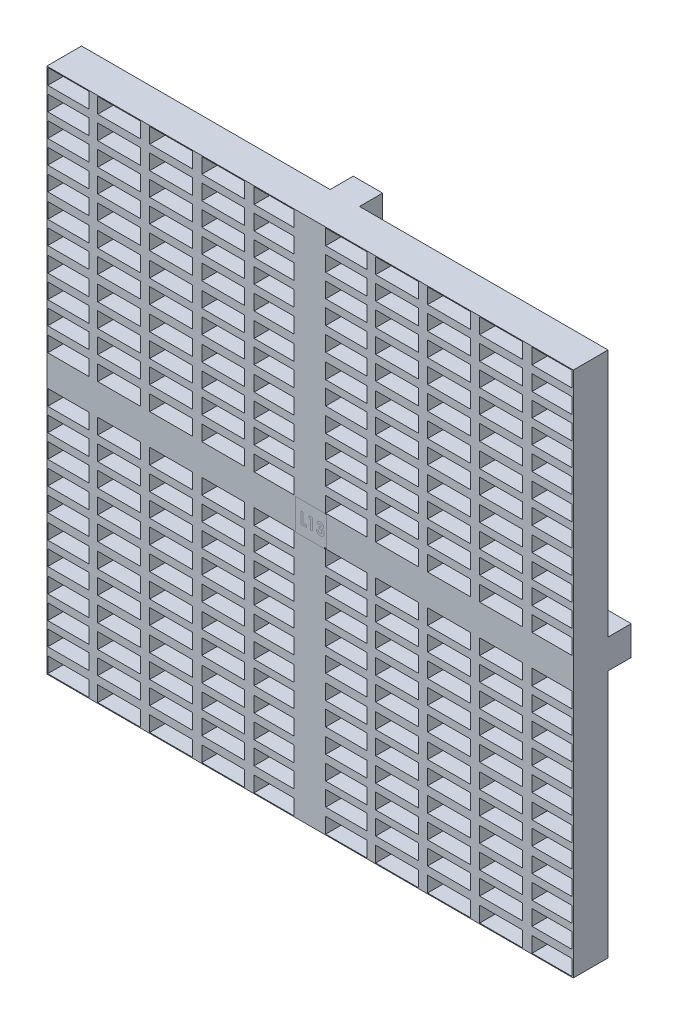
SolidWorks part; units mm, degrees
ref_plane "Plan de face" through (0, 0, 0) normal (0, 0, 1) x (1, 0, 0)
ref_plane "Plan de dessus" through (0, 0, 0) normal (0, 1, 0) x (1, 0, 0)
ref_plane "Plan de droite" through (0, 0, 0) normal (1, 0, 0) x (0, 0, -1)
sketch "Model" plane through (0, 0, 0) normal (0, 0, 1) x (1, 0, 0)
  line L0 (31717.6136, 67749.8801) -> (32517.6136, 67749.8801)
  line L1 (32517.6136, 67749.8801) -> (32517.6136, 66949.8801)
  line L2 (32517.6136, 66949.8801) -> (31717.6136, 66949.8801)
  line L3 (31717.6136, 66949.8801) -> (31717.6136, 67749.8801)
  line L4 (32517.6136, 66949.8801) -> (32517.6136, 67749.8801)
  line L5 (32517.6136, 67749.8801) -> (31717.6136, 67749.8801)
  line L6 (31717.6136, 67749.8801) -> (31717.6136, 66949.8801)
  line L7 (31717.6136, 66949.8801) -> (32517.6136, 66949.8801)
  line L8 (31677.2404, 60563.2953) -> (30647.2404, 60563.2953)
  line L9 (30647.2404, 60563.2953) -> (30647.2404, 60963.2953)
  line L10 (30647.2404, 60963.2953) -> (31677.2404, 60963.2953)
  line L11 (31677.2404, 60963.2953) -> (31677.2404, 60563.2953)
  line L12 (30398.2404, 60563.2953) -> (29292.2404, 60563.2953)
  line L13 (29292.2404, 60563.2953) -> (29292.2404, 60963.2953)
  line L14 (29292.2404, 60963.2953) -> (30398.2404, 60963.2953)
  line L15 (30398.2404, 60963.2953) -> (30398.2404, 60563.2953)
  line L16 (29056.2404, 60563.2953) -> (27942.2404, 60563.2953)
  line L17 (27942.2404, 60563.2953) -> (27942.2404, 60963.2953)
  line L18 (27942.2404, 60963.2953) -> (29056.2404, 60963.2953)
  line L19 (29056.2404, 60963.2953) -> (29056.2404, 60563.2953)
  line L20 (27709.2404, 60563.2953) -> (26597.2404, 60563.2953)
  line L21 (26597.2404, 60563.2953) -> (26597.2404, 60963.2953)
  line L22 (26597.2404, 60963.2953) -> (27709.2404, 60963.2953)
  line L23 (27709.2404, 60963.2953) -> (27709.2404, 60563.2953)
  line L24 (26367.2404, 60563.2953) -> (25302.2404, 60563.2953)
  line L25 (25302.2404, 60563.2953) -> (25302.2404, 60963.2953)
  line L26 (25302.2404, 60963.2953) -> (26367.2404, 60963.2953)
  line L27 (26367.2404, 60963.2953) -> (26367.2404, 60563.2953)
  line L28 (31677.2404, 61168.2953) -> (30647.2404, 61168.2953)
  line L29 (30647.2404, 61168.2953) -> (30647.2404, 61568.2953)
  line L30 (30647.2404, 61568.2953) -> (31677.2404, 61568.2953)
  line L31 (31677.2404, 61568.2953) -> (31677.2404, 61168.2953)
  line L32 (30398.2404, 61168.2953) -> (29292.2404, 61168.2953)
  line L33 (29292.2404, 61168.2953) -> (29292.2404, 61568.2953)
  line L34 (29292.2404, 61568.2953) -> (30398.2404, 61568.2953)
  line L35 (30398.2404, 61568.2953) -> (30398.2404, 61168.2953)
  line L36 (29056.2404, 61168.2953) -> (27942.2404, 61168.2953)
  line L37 (27942.2404, 61168.2953) -> (27942.2404, 61568.2953)
  line L38 (27942.2404, 61568.2953) -> (29056.2404, 61568.2953)
  line L39 (29056.2404, 61568.2953) -> (29056.2404, 61168.2953)
  line L40 (27709.2404, 61168.2953) -> (26597.2404, 61168.2953)
  line L41 (26597.2404, 61168.2953) -> (26597.2404, 61568.2953)
  line L42 (26597.2404, 61568.2953) -> (27709.2404, 61568.2953)
  line L43 (27709.2404, 61568.2953) -> (27709.2404, 61168.2953)
  line L44 (26367.2404, 61168.2953) -> (25302.2404, 61168.2953)
  line L45 (25302.2404, 61168.2953) -> (25302.2404, 61568.2953)
  line L46 (25302.2404, 61568.2953) -> (26367.2404, 61568.2953)
  line L47 (26367.2404, 61568.2953) -> (26367.2404, 61168.2953)
  line L48 (31677.2404, 61754.2953) -> (30647.2404, 61754.2953)
  line L49 (30647.2404, 61754.2953) -> (30647.2404, 62154.2953)
  line L50 (30647.2404, 62154.2953) -> (31677.2404, 62154.2953)
  line L51 (31677.2404, 62154.2953) -> (31677.2404, 61754.2953)
  line L52 (30398.2404, 61754.2953) -> (29292.2404, 61754.2953)
  line L53 (29292.2404, 61754.2953) -> (29292.2404, 62154.2953)
  line L54 (29292.2404, 62154.2953) -> (30398.2404, 62154.2953)
  line L55 (30398.2404, 62154.2953) -> (30398.2404, 61754.2953)
  line L56 (29056.2404, 61754.2953) -> (27942.2404, 61754.2953)
  line L57 (27942.2404, 61754.2953) -> (27942.2404, 62154.2953)
  line L58 (27942.2404, 62154.2953) -> (29056.2404, 62154.2953)
  line L59 (29056.2404, 62154.2953) -> (29056.2404, 61754.2953)
  line L60 (27709.2404, 61754.2953) -> (26597.2404, 61754.2953)
  line L61 (26597.2404, 61754.2953) -> (26597.2404, 62154.2953)
  line L62 (26597.2404, 62154.2953) -> (27709.2404, 62154.2953)
  line L63 (27709.2404, 62154.2953) -> (27709.2404, 61754.2953)
  line L64 (26367.2404, 61754.2953) -> (25302.2404, 61754.2953)
  line L65 (25302.2404, 61754.2953) -> (25302.2404, 62154.2953)
  line L66 (25302.2404, 62154.2953) -> (26367.2404, 62154.2953)
  line L67 (26367.2404, 62154.2953) -> (26367.2404, 61754.2953)
  line L68 (31677.2404, 62353.2953) -> (30647.2404, 62353.2953)
  line L69 (30647.2404, 62353.2953) -> (30647.2404, 62753.2953)
  line L70 (30647.2404, 62753.2953) -> (31677.2404, 62753.2953)
  line L71 (31677.2404, 62753.2953) -> (31677.2404, 62353.2953)
  line L72 (30398.2404, 62353.2953) -> (29292.2404, 62353.2953)
  line L73 (29292.2404, 62353.2953) -> (29292.2404, 62753.2953)
  line L74 (29292.2404, 62753.2953) -> (30398.2404, 62753.2953)
  line L75 (30398.2404, 62753.2953) -> (30398.2404, 62353.2953)
  line L76 (29056.2404, 62353.2953) -> (27942.2404, 62353.2953)
  line L77 (27942.2404, 62353.2953) -> (27942.2404, 62753.2953)
  line L78 (27942.2404, 62753.2953) -> (29056.2404, 62753.2953)
  line L79 (29056.2404, 62753.2953) -> (29056.2404, 62353.2953)
  line L80 (27709.2404, 62353.2953) -> (26597.2404, 62353.2953)
  line L81 (26597.2404, 62353.2953) -> (26597.2404, 62753.2953)
  line L82 (26597.2404, 62753.2953) -> (27709.2404, 62753.2953)
  line L83 (27709.2404, 62753.2953) -> (27709.2404, 62353.2953)
  line L84 (26367.2404, 62353.2953) -> (25302.2404, 62353.2953)
  line L85 (25302.2404, 62353.2953) -> (25302.2404, 62753.2953)
  line L86 (25302.2404, 62753.2953) -> (26367.2404, 62753.2953)
  line L87 (26367.2404, 62753.2953) -> (26367.2404, 62353.2953)
  line L88 (31677.2404, 62968.2953) -> (30647.2404, 62968.2953)
  line L89 (30647.2404, 62968.2953) -> (30647.2404, 63368.2953)
  line L90 (30647.2404, 63368.2953) -> (31677.2404, 63368.2953)
  line L91 (31677.2404, 63368.2953) -> (31677.2404, 62968.2953)
  line L92 (30398.2404, 62968.2953) -> (29292.2404, 62968.2953)
  line L93 (29292.2404, 62968.2953) -> (29292.2404, 63368.2953)
  line L94 (29292.2404, 63368.2953) -> (30398.2404, 63368.2953)
  line L95 (30398.2404, 63368.2953) -> (30398.2404, 62968.2953)
  line L96 (29056.2404, 62968.2953) -> (27942.2404, 62968.2953)
  line L97 (27942.2404, 62968.2953) -> (27942.2404, 63368.2953)
  line L98 (27942.2404, 63368.2953) -> (29056.2404, 63368.2953)
  line L99 (29056.2404, 63368.2953) -> (29056.2404, 62968.2953)
  line L100 (27709.2404, 62968.2953) -> (26597.2404, 62968.2953)
  line L101 (26597.2404, 62968.2953) -> (26597.2404, 63368.2953)
  line L102 (26597.2404, 63368.2953) -> (27709.2404, 63368.2953)
  line L103 (27709.2404, 63368.2953) -> (27709.2404, 62968.2953)
  line L104 (26367.2404, 62968.2953) -> (25302.2404, 62968.2953)
  line L105 (25302.2404, 62968.2953) -> (25302.2404, 63368.2953)
  line L106 (25302.2404, 63368.2953) -> (26367.2404, 63368.2953)
  line L107 (26367.2404, 63368.2953) -> (26367.2404, 62968.2953)
  line L108 (31677.2404, 63558.2953) -> (30647.2404, 63558.2953)
  line L109 (30647.2404, 63558.2953) -> (30647.2404, 63958.2953)
  line L110 (30647.2404, 63958.2953) -> (31677.2404, 63958.2953)
  line L111 (31677.2404, 63958.2953) -> (31677.2404, 63558.2953)
  line L112 (30398.2404, 63558.2953) -> (29292.2404, 63558.2953)
  line L113 (29292.2404, 63558.2953) -> (29292.2404, 63958.2953)
  line L114 (29292.2404, 63958.2953) -> (30398.2404, 63958.2953)
  line L115 (30398.2404, 63958.2953) -> (30398.2404, 63558.2953)
  line L116 (29056.2404, 63558.2953) -> (27942.2404, 63558.2953)
  line L117 (27942.2404, 63558.2953) -> (27942.2404, 63958.2953)
  line L118 (27942.2404, 63958.2953) -> (29056.2404, 63958.2953)
  line L119 (29056.2404, 63958.2953) -> (29056.2404, 63558.2953)
  line L120 (27709.2404, 63558.2953) -> (26597.2404, 63558.2953)
  line L121 (26597.2404, 63558.2953) -> (26597.2404, 63958.2953)
  line L122 (26597.2404, 63958.2953) -> (27709.2404, 63958.2953)
  line L123 (27709.2404, 63958.2953) -> (27709.2404, 63558.2953)
  line L124 (26367.2404, 63558.2953) -> (25302.2404, 63558.2953)
  line L125 (25302.2404, 63558.2953) -> (25302.2404, 63958.2953)
  line L126 (25302.2404, 63958.2953) -> (26367.2404, 63958.2953)
  line L127 (26367.2404, 63958.2953) -> (26367.2404, 63558.2953)
  line L128 (31677.2404, 64173.2953) -> (30647.2404, 64173.2953)
  line L129 (30647.2404, 64173.2953) -> (30647.2404, 64573.2953)
  line L130 (30647.2404, 64573.2953) -> (31677.2404, 64573.2953)
  line L131 (31677.2404, 64573.2953) -> (31677.2404, 64173.2953)
  line L132 (30398.2404, 64173.2953) -> (29292.2404, 64173.2953)
  line L133 (29292.2404, 64173.2953) -> (29292.2404, 64573.2953)
  line L134 (29292.2404, 64573.2953) -> (30398.2404, 64573.2953)
  line L135 (30398.2404, 64573.2953) -> (30398.2404, 64173.2953)
  line L136 (29056.2404, 64173.2953) -> (27942.2404, 64173.2953)
  line L137 (27942.2404, 64173.2953) -> (27942.2404, 64573.2953)
  line L138 (27942.2404, 64573.2953) -> (29056.2404, 64573.2953)
  line L139 (29056.2404, 64573.2953) -> (29056.2404, 64173.2953)
  line L140 (27709.2404, 64173.2953) -> (26597.2404, 64173.2953)
  line L141 (26597.2404, 64173.2953) -> (26597.2404, 64573.2953)
  line L142 (26597.2404, 64573.2953) -> (27709.2404, 64573.2953)
  line L143 (27709.2404, 64573.2953) -> (27709.2404, 64173.2953)
  line L144 (26367.2404, 64173.2953) -> (25302.2404, 64173.2953)
  line L145 (25302.2404, 64173.2953) -> (25302.2404, 64573.2953)
  line L146 (25302.2404, 64573.2953) -> (26367.2404, 64573.2953)
  line L147 (26367.2404, 64573.2953) -> (26367.2404, 64173.2953)
  line L148 (31677.2404, 64774.2953) -> (30647.2404, 64774.2953)
  line L149 (30647.2404, 64774.2953) -> (30647.2404, 65174.2953)
  line L150 (30647.2404, 65174.2953) -> (31677.2404, 65174.2953)
  line L151 (31677.2404, 65174.2953) -> (31677.2404, 64774.2953)
  line L152 (30398.2404, 64774.2953) -> (29292.2404, 64774.2953)
  line L153 (29292.2404, 64774.2953) -> (29292.2404, 65174.2953)
  line L154 (29292.2404, 65174.2953) -> (30398.2404, 65174.2953)
  line L155 (30398.2404, 65174.2953) -> (30398.2404, 64774.2953)
  line L156 (29056.2404, 64774.2953) -> (27942.2404, 64774.2953)
  line L157 (27942.2404, 64774.2953) -> (27942.2404, 65174.2953)
  line L158 (27942.2404, 65174.2953) -> (29056.2404, 65174.2953)
  line L159 (29056.2404, 65174.2953) -> (29056.2404, 64774.2953)
  line L160 (27709.2404, 64774.2953) -> (26597.2404, 64774.2953)
  line L161 (26597.2404, 64774.2953) -> (26597.2404, 65174.2953)
  line L162 (26597.2404, 65174.2953) -> (27709.2404, 65174.2953)
  line L163 (27709.2404, 65174.2953) -> (27709.2404, 64774.2953)
  line L164 (26367.2404, 64774.2953) -> (25302.2404, 64774.2953)
  line L165 (25302.2404, 64774.2953) -> (25302.2404, 65174.2953)
  line L166 (25302.2404, 65174.2953) -> (26367.2404, 65174.2953)
  line L167 (26367.2404, 65174.2953) -> (26367.2404, 64774.2953)
  line L168 (31677.2404, 65373.2953) -> (30647.2404, 65373.2953)
  line L169 (30647.2404, 65373.2953) -> (30647.2404, 65773.2953)
  line L170 (30647.2404, 65773.2953) -> (31677.2404, 65773.2953)
  line L171 (31677.2404, 65773.2953) -> (31677.2404, 65373.2953)
  line L172 (30398.2404, 65373.2953) -> (29292.2404, 65373.2953)
  line L173 (29292.2404, 65373.2953) -> (29292.2404, 65773.2953)
  line L174 (29292.2404, 65773.2953) -> (30398.2404, 65773.2953)
  line L175 (30398.2404, 65773.2953) -> (30398.2404, 65373.2953)
  line L176 (29056.2404, 65373.2953) -> (27942.2404, 65373.2953)
  line L177 (27942.2404, 65373.2953) -> (27942.2404, 65773.2953)
  line L178 (27942.2404, 65773.2953) -> (29056.2404, 65773.2953)
  line L179 (29056.2404, 65773.2953) -> (29056.2404, 65373.2953)
  line L180 (27709.2404, 65373.2953) -> (26597.2404, 65373.2953)
  line L181 (26597.2404, 65373.2953) -> (26597.2404, 65773.2953)
  line L182 (26597.2404, 65773.2953) -> (27709.2404, 65773.2953)
  line L183 (27709.2404, 65773.2953) -> (27709.2404, 65373.2953)
  line L184 (26367.2404, 65373.2953) -> (25302.2404, 65373.2953)
  line L185 (25302.2404, 65373.2953) -> (25302.2404, 65773.2953)
  line L186 (25302.2404, 65773.2953) -> (26367.2404, 65773.2953)
  line L187 (26367.2404, 65773.2953) -> (26367.2404, 65373.2953)
  line L188 (31677.2404, 65968.2953) -> (30647.2404, 65968.2953)
  line L189 (30647.2404, 65968.2953) -> (30647.2404, 66368.2953)
  line L190 (30647.2404, 66368.2953) -> (31677.2404, 66368.2953)
  line L191 (31677.2404, 66368.2953) -> (31677.2404, 65968.2953)
  line L192 (30398.2404, 65968.2953) -> (29292.2404, 65968.2953)
  line L193 (29292.2404, 65968.2953) -> (29292.2404, 66368.2953)
  line L194 (29292.2404, 66368.2953) -> (30398.2404, 66368.2953)
  line L195 (30398.2404, 66368.2953) -> (30398.2404, 65968.2953)
  line L196 (29056.2404, 65968.2953) -> (27942.2404, 65968.2953)
  line L197 (27942.2404, 65968.2953) -> (27942.2404, 66368.2953)
  line L198 (27942.2404, 66368.2953) -> (29056.2404, 66368.2953)
  line L199 (29056.2404, 66368.2953) -> (29056.2404, 65968.2953)
  line L200 (27709.2404, 65968.2953) -> (26597.2404, 65968.2953)
  line L201 (26597.2404, 65968.2953) -> (26597.2404, 66368.2953)
  line L202 (26597.2404, 66368.2953) -> (27709.2404, 66368.2953)
  line L203 (27709.2404, 66368.2953) -> (27709.2404, 65968.2953)
  line L204 (26367.2404, 65968.2953) -> (25302.2404, 65968.2953)
  line L205 (25302.2404, 65968.2953) -> (25302.2404, 66368.2953)
  line L206 (25302.2404, 66368.2953) -> (26367.2404, 66368.2953)
  line L207 (26367.2404, 66368.2953) -> (26367.2404, 65968.2953)
  line L208 (31677.2404, 66563.2953) -> (30647.2404, 66563.2953)
  line L209 (30647.2404, 66563.2953) -> (30647.2404, 66963.2953)
  line L210 (30647.2404, 66963.2953) -> (31677.2404, 66963.2953)
  line L211 (31677.2404, 66963.2953) -> (31677.2404, 66563.2953)
  line L212 (30398.2404, 66563.2953) -> (29292.2404, 66563.2953)
  line L213 (29292.2404, 66563.2953) -> (29292.2404, 66963.2953)
  line L214 (29292.2404, 66963.2953) -> (30398.2404, 66963.2953)
  line L215 (30398.2404, 66963.2953) -> (30398.2404, 66563.2953)
  line L216 (29056.2404, 66563.2953) -> (27942.2404, 66563.2953)
  line L217 (27942.2404, 66563.2953) -> (27942.2404, 66963.2953)
  line L218 (27942.2404, 66963.2953) -> (29056.2404, 66963.2953)
  line L219 (29056.2404, 66963.2953) -> (29056.2404, 66563.2953)
  line L220 (27709.2404, 66563.2953) -> (26597.2404, 66563.2953)
  line L221 (26597.2404, 66563.2953) -> (26597.2404, 66963.2953)
  line L222 (26597.2404, 66963.2953) -> (27709.2404, 66963.2953)
  line L223 (27709.2404, 66963.2953) -> (27709.2404, 66563.2953)
  line L224 (26367.2404, 66563.2953) -> (25302.2404, 66563.2953)
  line L225 (25302.2404, 66563.2953) -> (25302.2404, 66963.2953)
  line L226 (25302.2404, 66963.2953) -> (26367.2404, 66963.2953)
  line L227 (26367.2404, 66963.2953) -> (26367.2404, 66563.2953)
  line L228 (25277.2404, 66983.2953) -> (25277.2404, 60543.2953)
  line L229 (25277.2404, 60543.2953) -> (31717.2404, 60543.2953)
  line L230 (31717.2404, 60543.2953) -> (31717.2404, 66983.2953)
  line L231 (31717.2404, 66983.2953) -> (25277.2404, 66983.2953)
  line L232 (38877.2404, 60563.2953) -> (37847.2404, 60563.2953)
  line L233 (37847.2404, 60563.2953) -> (37847.2404, 60963.2953)
  line L234 (37847.2404, 60963.2953) -> (38877.2404, 60963.2953)
  line L235 (38877.2404, 60963.2953) -> (38877.2404, 60563.2953)
  line L236 (37598.2404, 60563.2953) -> (36492.2404, 60563.2953)
  line L237 (36492.2404, 60563.2953) -> (36492.2404, 60963.2953)
  line L238 (36492.2404, 60963.2953) -> (37598.2404, 60963.2953)
  line L239 (37598.2404, 60963.2953) -> (37598.2404, 60563.2953)
  line L240 (36256.2404, 60563.2953) -> (35142.2404, 60563.2953)
  line L241 (35142.2404, 60563.2953) -> (35142.2404, 60963.2953)
  line L242 (35142.2404, 60963.2953) -> (36256.2404, 60963.2953)
  line L243 (36256.2404, 60963.2953) -> (36256.2404, 60563.2953)
  line L244 (34909.2404, 60563.2953) -> (33797.2404, 60563.2953)
  line L245 (33797.2404, 60563.2953) -> (33797.2404, 60963.2953)
  line L246 (33797.2404, 60963.2953) -> (34909.2404, 60963.2953)
  line L247 (34909.2404, 60963.2953) -> (34909.2404, 60563.2953)
  line L248 (33567.2404, 60563.2953) -> (32502.2404, 60563.2953)
  line L249 (32502.2404, 60563.2953) -> (32502.2404, 60963.2953)
  line L250 (32502.2404, 60963.2953) -> (33567.2404, 60963.2953)
  line L251 (33567.2404, 60963.2953) -> (33567.2404, 60563.2953)
  line L252 (38877.2404, 61168.2953) -> (37847.2404, 61168.2953)
  line L253 (37847.2404, 61168.2953) -> (37847.2404, 61568.2953)
  line L254 (37847.2404, 61568.2953) -> (38877.2404, 61568.2953)
  line L255 (38877.2404, 61568.2953) -> (38877.2404, 61168.2953)
  line L256 (37598.2404, 61168.2953) -> (36492.2404, 61168.2953)
  line L257 (36492.2404, 61168.2953) -> (36492.2404, 61568.2953)
  line L258 (36492.2404, 61568.2953) -> (37598.2404, 61568.2953)
  line L259 (37598.2404, 61568.2953) -> (37598.2404, 61168.2953)
  line L260 (36256.2404, 61168.2953) -> (35142.2404, 61168.2953)
  line L261 (35142.2404, 61168.2953) -> (35142.2404, 61568.2953)
  line L262 (35142.2404, 61568.2953) -> (36256.2404, 61568.2953)
  line L263 (36256.2404, 61568.2953) -> (36256.2404, 61168.2953)
  line L264 (34909.2404, 61168.2953) -> (33797.2404, 61168.2953)
  line L265 (33797.2404, 61168.2953) -> (33797.2404, 61568.2953)
  line L266 (33797.2404, 61568.2953) -> (34909.2404, 61568.2953)
  line L267 (34909.2404, 61568.2953) -> (34909.2404, 61168.2953)
  line L268 (33567.2404, 61168.2953) -> (32502.2404, 61168.2953)
  line L269 (32502.2404, 61168.2953) -> (32502.2404, 61568.2953)
  line L270 (32502.2404, 61568.2953) -> (33567.2404, 61568.2953)
  line L271 (33567.2404, 61568.2953) -> (33567.2404, 61168.2953)
  line L272 (38877.2404, 61754.2953) -> (37847.2404, 61754.2953)
  line L273 (37847.2404, 61754.2953) -> (37847.2404, 62154.2953)
  line L274 (37847.2404, 62154.2953) -> (38877.2404, 62154.2953)
  line L275 (38877.2404, 62154.2953) -> (38877.2404, 61754.2953)
  line L276 (37598.2404, 61754.2953) -> (36492.2404, 61754.2953)
  line L277 (36492.2404, 61754.2953) -> (36492.2404, 62154.2953)
  line L278 (36492.2404, 62154.2953) -> (37598.2404, 62154.2953)
  line L279 (37598.2404, 62154.2953) -> (37598.2404, 61754.2953)
  line L280 (36256.2404, 61754.2953) -> (35142.2404, 61754.2953)
  line L281 (35142.2404, 61754.2953) -> (35142.2404, 62154.2953)
  line L282 (35142.2404, 62154.2953) -> (36256.2404, 62154.2953)
  line L283 (36256.2404, 62154.2953) -> (36256.2404, 61754.2953)
  line L284 (34909.2404, 61754.2953) -> (33797.2404, 61754.2953)
  line L285 (33797.2404, 61754.2953) -> (33797.2404, 62154.2953)
  line L286 (33797.2404, 62154.2953) -> (34909.2404, 62154.2953)
  line L287 (34909.2404, 62154.2953) -> (34909.2404, 61754.2953)
  line L288 (33567.2404, 61754.2953) -> (32502.2404, 61754.2953)
  line L289 (32502.2404, 61754.2953) -> (32502.2404, 62154.2953)
  line L290 (32502.2404, 62154.2953) -> (33567.2404, 62154.2953)
  line L291 (33567.2404, 62154.2953) -> (33567.2404, 61754.2953)
  line L292 (38877.2404, 62353.2953) -> (37847.2404, 62353.2953)
  line L293 (37847.2404, 62353.2953) -> (37847.2404, 62753.2953)
  line L294 (37847.2404, 62753.2953) -> (38877.2404, 62753.2953)
  line L295 (38877.2404, 62753.2953) -> (38877.2404, 62353.2953)
  line L296 (37598.2404, 62353.2953) -> (36492.2404, 62353.2953)
  line L297 (36492.2404, 62353.2953) -> (36492.2404, 62753.2953)
  line L298 (36492.2404, 62753.2953) -> (37598.2404, 62753.2953)
  line L299 (37598.2404, 62753.2953) -> (37598.2404, 62353.2953)
  line L300 (36256.2404, 62353.2953) -> (35142.2404, 62353.2953)
  line L301 (35142.2404, 62353.2953) -> (35142.2404, 62753.2953)
  line L302 (35142.2404, 62753.2953) -> (36256.2404, 62753.2953)
  line L303 (36256.2404, 62753.2953) -> (36256.2404, 62353.2953)
  line L304 (34909.2404, 62353.2953) -> (33797.2404, 62353.2953)
  line L305 (33797.2404, 62353.2953) -> (33797.2404, 62753.2953)
  line L306 (33797.2404, 62753.2953) -> (34909.2404, 62753.2953)
  line L307 (34909.2404, 62753.2953) -> (34909.2404, 62353.2953)
  line L308 (33567.2404, 62353.2953) -> (32502.2404, 62353.2953)
  line L309 (32502.2404, 62353.2953) -> (32502.2404, 62753.2953)
  line L310 (32502.2404, 62753.2953) -> (33567.2404, 62753.2953)
  line L311 (33567.2404, 62753.2953) -> (33567.2404, 62353.2953)
  line L312 (38877.2404, 62968.2953) -> (37847.2404, 62968.2953)
  line L313 (37847.2404, 62968.2953) -> (37847.2404, 63368.2953)
  line L314 (37847.2404, 63368.2953) -> (38877.2404, 63368.2953)
  line L315 (38877.2404, 63368.2953) -> (38877.2404, 62968.2953)
  line L316 (37598.2404, 62968.2953) -> (36492.2404, 62968.2953)
  line L317 (36492.2404, 62968.2953) -> (36492.2404, 63368.2953)
  line L318 (36492.2404, 63368.2953) -> (37598.2404, 63368.2953)
  line L319 (37598.2404, 63368.2953) -> (37598.2404, 62968.2953)
  line L320 (36256.2404, 62968.2953) -> (35142.2404, 62968.2953)
  line L321 (35142.2404, 62968.2953) -> (35142.2404, 63368.2953)
  line L322 (35142.2404, 63368.2953) -> (36256.2404, 63368.2953)
  line L323 (36256.2404, 63368.2953) -> (36256.2404, 62968.2953)
  line L324 (34909.2404, 62968.2953) -> (33797.2404, 62968.2953)
  line L325 (33797.2404, 62968.2953) -> (33797.2404, 63368.2953)
  line L326 (33797.2404, 63368.2953) -> (34909.2404, 63368.2953)
  line L327 (34909.2404, 63368.2953) -> (34909.2404, 62968.2953)
  line L328 (33567.2404, 62968.2953) -> (32502.2404, 62968.2953)
  line L329 (32502.2404, 62968.2953) -> (32502.2404, 63368.2953)
  line L330 (32502.2404, 63368.2953) -> (33567.2404, 63368.2953)
  line L331 (33567.2404, 63368.2953) -> (33567.2404, 62968.2953)
  line L332 (38877.2404, 63558.2953) -> (37847.2404, 63558.2953)
  line L333 (37847.2404, 63558.2953) -> (37847.2404, 63958.2953)
  line L334 (37847.2404, 63958.2953) -> (38877.2404, 63958.2953)
  line L335 (38877.2404, 63958.2953) -> (38877.2404, 63558.2953)
  line L336 (37598.2404, 63558.2953) -> (36492.2404, 63558.2953)
  line L337 (36492.2404, 63558.2953) -> (36492.2404, 63958.2953)
  line L338 (36492.2404, 63958.2953) -> (37598.2404, 63958.2953)
  line L339 (37598.2404, 63958.2953) -> (37598.2404, 63558.2953)
  line L340 (36256.2404, 63558.2953) -> (35142.2404, 63558.2953)
  line L341 (35142.2404, 63558.2953) -> (35142.2404, 63958.2953)
  line L342 (35142.2404, 63958.2953) -> (36256.2404, 63958.2953)
  line L343 (36256.2404, 63958.2953) -> (36256.2404, 63558.2953)
  line L344 (34909.2404, 63558.2953) -> (33797.2404, 63558.2953)
  line L345 (33797.2404, 63558.2953) -> (33797.2404, 63958.2953)
  line L346 (33797.2404, 63958.2953) -> (34909.2404, 63958.2953)
  line L347 (34909.2404, 63958.2953) -> (34909.2404, 63558.2953)
  line L348 (33567.2404, 63558.2953) -> (32502.2404, 63558.2953)
  line L349 (32502.2404, 63558.2953) -> (32502.2404, 63958.2953)
  line L350 (32502.2404, 63958.2953) -> (33567.2404, 63958.2953)
  line L351 (33567.2404, 63958.2953) -> (33567.2404, 63558.2953)
  line L352 (38877.2404, 64173.2953) -> (37847.2404, 64173.2953)
  line L353 (37847.2404, 64173.2953) -> (37847.2404, 64573.2953)
  line L354 (37847.2404, 64573.2953) -> (38877.2404, 64573.2953)
  line L355 (38877.2404, 64573.2953) -> (38877.2404, 64173.2953)
  line L356 (37598.2404, 64173.2953) -> (36492.2404, 64173.2953)
  line L357 (36492.2404, 64173.2953) -> (36492.2404, 64573.2953)
  line L358 (36492.2404, 64573.2953) -> (37598.2404, 64573.2953)
  line L359 (37598.2404, 64573.2953) -> (37598.2404, 64173.2953)
  line L360 (36256.2404, 64173.2953) -> (35142.2404, 64173.2953)
  line L361 (35142.2404, 64173.2953) -> (35142.2404, 64573.2953)
  line L362 (35142.2404, 64573.2953) -> (36256.2404, 64573.2953)
  line L363 (36256.2404, 64573.2953) -> (36256.2404, 64173.2953)
  line L364 (34909.2404, 64173.2953) -> (33797.2404, 64173.2953)
  line L365 (33797.2404, 64173.2953) -> (33797.2404, 64573.2953)
  line L366 (33797.2404, 64573.2953) -> (34909.2404, 64573.2953)
  line L367 (34909.2404, 64573.2953) -> (34909.2404, 64173.2953)
  line L368 (33567.2404, 64173.2953) -> (32502.2404, 64173.2953)
  line L369 (32502.2404, 64173.2953) -> (32502.2404, 64573.2953)
  line L370 (32502.2404, 64573.2953) -> (33567.2404, 64573.2953)
  line L371 (33567.2404, 64573.2953) -> (33567.2404, 64173.2953)
  line L372 (38877.2404, 64774.2953) -> (37847.2404, 64774.2953)
  line L373 (37847.2404, 64774.2953) -> (37847.2404, 65174.2953)
  line L374 (37847.2404, 65174.2953) -> (38877.2404, 65174.2953)
  line L375 (38877.2404, 65174.2953) -> (38877.2404, 64774.2953)
  line L376 (37598.2404, 64774.2953) -> (36492.2404, 64774.2953)
  line L377 (36492.2404, 64774.2953) -> (36492.2404, 65174.2953)
  line L378 (36492.2404, 65174.2953) -> (37598.2404, 65174.2953)
  line L379 (37598.2404, 65174.2953) -> (37598.2404, 64774.2953)
  line L380 (36256.2404, 64774.2953) -> (35142.2404, 64774.2953)
  line L381 (35142.2404, 64774.2953) -> (35142.2404, 65174.2953)
  line L382 (35142.2404, 65174.2953) -> (36256.2404, 65174.2953)
  line L383 (36256.2404, 65174.2953) -> (36256.2404, 64774.2953)
  line L384 (34909.2404, 64774.2953) -> (33797.2404, 64774.2953)
  line L385 (33797.2404, 64774.2953) -> (33797.2404, 65174.2953)
  line L386 (33797.2404, 65174.2953) -> (34909.2404, 65174.2953)
  line L387 (34909.2404, 65174.2953) -> (34909.2404, 64774.2953)
  line L388 (33567.2404, 64774.2953) -> (32502.2404, 64774.2953)
  line L389 (32502.2404, 64774.2953) -> (32502.2404, 65174.2953)
  line L390 (32502.2404, 65174.2953) -> (33567.2404, 65174.2953)
  line L391 (33567.2404, 65174.2953) -> (33567.2404, 64774.2953)
  line L392 (38877.2404, 65373.2953) -> (37847.2404, 65373.2953)
  line L393 (37847.2404, 65373.2953) -> (37847.2404, 65773.2953)
  line L394 (37847.2404, 65773.2953) -> (38877.2404, 65773.2953)
  line L395 (38877.2404, 65773.2953) -> (38877.2404, 65373.2953)
  line L396 (37598.2404, 65373.2953) -> (36492.2404, 65373.2953)
  line L397 (36492.2404, 65373.2953) -> (36492.2404, 65773.2953)
  line L398 (36492.2404, 65773.2953) -> (37598.2404, 65773.2953)
  line L399 (37598.2404, 65773.2953) -> (37598.2404, 65373.2953)
  line L400 (36256.2404, 65373.2953) -> (35142.2404, 65373.2953)
  line L401 (35142.2404, 65373.2953) -> (35142.2404, 65773.2953)
  line L402 (35142.2404, 65773.2953) -> (36256.2404, 65773.2953)
  line L403 (36256.2404, 65773.2953) -> (36256.2404, 65373.2953)
  line L404 (34909.2404, 65373.2953) -> (33797.2404, 65373.2953)
  line L405 (33797.2404, 65373.2953) -> (33797.2404, 65773.2953)
  line L406 (33797.2404, 65773.2953) -> (34909.2404, 65773.2953)
  line L407 (34909.2404, 65773.2953) -> (34909.2404, 65373.2953)
  line L408 (33567.2404, 65373.2953) -> (32502.2404, 65373.2953)
  line L409 (32502.2404, 65373.2953) -> (32502.2404, 65773.2953)
  line L410 (32502.2404, 65773.2953) -> (33567.2404, 65773.2953)
  line L411 (33567.2404, 65773.2953) -> (33567.2404, 65373.2953)
  line L412 (38877.2404, 65968.2953) -> (37847.2404, 65968.2953)
  line L413 (37847.2404, 65968.2953) -> (37847.2404, 66368.2953)
  line L414 (37847.2404, 66368.2953) -> (38877.2404, 66368.2953)
  line L415 (38877.2404, 66368.2953) -> (38877.2404, 65968.2953)
  line L416 (37598.2404, 65968.2953) -> (36492.2404, 65968.2953)
  line L417 (36492.2404, 65968.2953) -> (36492.2404, 66368.2953)
  line L418 (36492.2404, 66368.2953) -> (37598.2404, 66368.2953)
  line L419 (37598.2404, 66368.2953) -> (37598.2404, 65968.2953)
  line L420 (36256.2404, 65968.2953) -> (35142.2404, 65968.2953)
  line L421 (35142.2404, 65968.2953) -> (35142.2404, 66368.2953)
  line L422 (35142.2404, 66368.2953) -> (36256.2404, 66368.2953)
  line L423 (36256.2404, 66368.2953) -> (36256.2404, 65968.2953)
  line L424 (34909.2404, 65968.2953) -> (33797.2404, 65968.2953)
  line L425 (33797.2404, 65968.2953) -> (33797.2404, 66368.2953)
  line L426 (33797.2404, 66368.2953) -> (34909.2404, 66368.2953)
  line L427 (34909.2404, 66368.2953) -> (34909.2404, 65968.2953)
  line L428 (33567.2404, 65968.2953) -> (32502.2404, 65968.2953)
  line L429 (32502.2404, 65968.2953) -> (32502.2404, 66368.2953)
  line L430 (32502.2404, 66368.2953) -> (33567.2404, 66368.2953)
  line L431 (33567.2404, 66368.2953) -> (33567.2404, 65968.2953)
  line L432 (38877.2404, 66563.2953) -> (37847.2404, 66563.2953)
  line L433 (37847.2404, 66563.2953) -> (37847.2404, 66963.2953)
  line L434 (37847.2404, 66963.2953) -> (38877.2404, 66963.2953)
  line L435 (38877.2404, 66963.2953) -> (38877.2404, 66563.2953)
  line L436 (37598.2404, 66563.2953) -> (36492.2404, 66563.2953)
  line L437 (36492.2404, 66563.2953) -> (36492.2404, 66963.2953)
  line L438 (36492.2404, 66963.2953) -> (37598.2404, 66963.2953)
  line L439 (37598.2404, 66963.2953) -> (37598.2404, 66563.2953)
  line L440 (36256.2404, 66563.2953) -> (35142.2404, 66563.2953)
  line L441 (35142.2404, 66563.2953) -> (35142.2404, 66963.2953)
  line L442 (35142.2404, 66963.2953) -> (36256.2404, 66963.2953)
  line L443 (36256.2404, 66963.2953) -> (36256.2404, 66563.2953)
  line L444 (34909.2404, 66563.2953) -> (33797.2404, 66563.2953)
  line L445 (33797.2404, 66563.2953) -> (33797.2404, 66963.2953)
  line L446 (33797.2404, 66963.2953) -> (34909.2404, 66963.2953)
  line L447 (34909.2404, 66963.2953) -> (34909.2404, 66563.2953)
  line L448 (33567.2404, 66563.2953) -> (32502.2404, 66563.2953)
  line L449 (32502.2404, 66563.2953) -> (32502.2404, 66963.2953)
  line L450 (32502.2404, 66963.2953) -> (33567.2404, 66963.2953)
  line L451 (33567.2404, 66963.2953) -> (33567.2404, 66563.2953)
  line L452 (32477.2404, 66983.2953) -> (32477.2404, 60543.2953)
  line L453 (32477.2404, 60543.2953) -> (38917.2404, 60543.2953)
  line L454 (38917.2404, 60543.2953) -> (38917.2404, 66983.2953)
  line L455 (38917.2404, 66983.2953) -> (32477.2404, 66983.2953)
  line L456 (31677.2404, 67763.2953) -> (31677.2404, 68163.2953)
  line L457 (31677.2404, 68163.2953) -> (30647.2404, 68163.2953)
  line L458 (30647.2404, 68163.2953) -> (30647.2404, 67763.2953)
  line L459 (30647.2404, 67763.2953) -> (31677.2404, 67763.2953)
  line L460 (30398.2404, 67763.2953) -> (30398.2404, 68163.2953)
  line L461 (30398.2404, 68163.2953) -> (29292.2404, 68163.2953)
  line L462 (29292.2404, 68163.2953) -> (29292.2404, 67763.2953)
  line L463 (29292.2404, 67763.2953) -> (30398.2404, 67763.2953)
  line L464 (29056.2404, 67763.2953) -> (29056.2404, 68163.2953)
  line L465 (29056.2404, 68163.2953) -> (27942.2404, 68163.2953)
  line L466 (27942.2404, 68163.2953) -> (27942.2404, 67763.2953)
  line L467 (27942.2404, 67763.2953) -> (29056.2404, 67763.2953)
  line L468 (27709.2404, 67763.2953) -> (27709.2404, 68163.2953)
  line L469 (27709.2404, 68163.2953) -> (26597.2404, 68163.2953)
  line L470 (26597.2404, 68163.2953) -> (26597.2404, 67763.2953)
  line L471 (26597.2404, 67763.2953) -> (27709.2404, 67763.2953)
  line L472 (26367.2404, 67763.2953) -> (26367.2404, 68163.2953)
  line L473 (26367.2404, 68163.2953) -> (25302.2404, 68163.2953)
  line L474 (25302.2404, 68163.2953) -> (25302.2404, 67763.2953)
  line L475 (25302.2404, 67763.2953) -> (26367.2404, 67763.2953)
  line L476 (31677.2404, 68368.2953) -> (31677.2404, 68768.2953)
  line L477 (31677.2404, 68768.2953) -> (30647.2404, 68768.2953)
  line L478 (30647.2404, 68768.2953) -> (30647.2404, 68368.2953)
  line L479 (30647.2404, 68368.2953) -> (31677.2404, 68368.2953)
  line L480 (30398.2404, 68368.2953) -> (30398.2404, 68768.2953)
  line L481 (30398.2404, 68768.2953) -> (29292.2404, 68768.2953)
  line L482 (29292.2404, 68768.2953) -> (29292.2404, 68368.2953)
  line L483 (29292.2404, 68368.2953) -> (30398.2404, 68368.2953)
  line L484 (29056.2404, 68368.2953) -> (29056.2404, 68768.2953)
  line L485 (29056.2404, 68768.2953) -> (27942.2404, 68768.2953)
  line L486 (27942.2404, 68768.2953) -> (27942.2404, 68368.2953)
  line L487 (27942.2404, 68368.2953) -> (29056.2404, 68368.2953)
  line L488 (27709.2404, 68368.2953) -> (27709.2404, 68768.2953)
  line L489 (27709.2404, 68768.2953) -> (26597.2404, 68768.2953)
  line L490 (26597.2404, 68768.2953) -> (26597.2404, 68368.2953)
  line L491 (26597.2404, 68368.2953) -> (27709.2404, 68368.2953)
  line L492 (26367.2404, 68368.2953) -> (26367.2404, 68768.2953)
  line L493 (26367.2404, 68768.2953) -> (25302.2404, 68768.2953)
  line L494 (25302.2404, 68768.2953) -> (25302.2404, 68368.2953)
  line L495 (25302.2404, 68368.2953) -> (26367.2404, 68368.2953)
  line L496 (31677.2404, 68954.2953) -> (31677.2404, 69354.2953)
  line L497 (31677.2404, 69354.2953) -> (30647.2404, 69354.2953)
  line L498 (30647.2404, 69354.2953) -> (30647.2404, 68954.2953)
  line L499 (30647.2404, 68954.2953) -> (31677.2404, 68954.2953)
  line L500 (30398.2404, 68954.2953) -> (30398.2404, 69354.2953)
  line L501 (30398.2404, 69354.2953) -> (29292.2404, 69354.2953)
  line L502 (29292.2404, 69354.2953) -> (29292.2404, 68954.2953)
  line L503 (29292.2404, 68954.2953) -> (30398.2404, 68954.2953)
  line L504 (29056.2404, 68954.2953) -> (29056.2404, 69354.2953)
  line L505 (29056.2404, 69354.2953) -> (27942.2404, 69354.2953)
  line L506 (27942.2404, 69354.2953) -> (27942.2404, 68954.2953)
  line L507 (27942.2404, 68954.2953) -> (29056.2404, 68954.2953)
  line L508 (27709.2404, 68954.2953) -> (27709.2404, 69354.2953)
  line L509 (27709.2404, 69354.2953) -> (26597.2404, 69354.2953)
  line L510 (26597.2404, 69354.2953) -> (26597.2404, 68954.2953)
  line L511 (26597.2404, 68954.2953) -> (27709.2404, 68954.2953)
  line L512 (26367.2404, 68954.2953) -> (26367.2404, 69354.2953)
  line L513 (26367.2404, 69354.2953) -> (25302.2404, 69354.2953)
  line L514 (25302.2404, 69354.2953) -> (25302.2404, 68954.2953)
  line L515 (25302.2404, 68954.2953) -> (26367.2404, 68954.2953)
  line L516 (31677.2404, 69553.2953) -> (31677.2404, 69953.2953)
  line L517 (31677.2404, 69953.2953) -> (30647.2404, 69953.2953)
  line L518 (30647.2404, 69953.2953) -> (30647.2404, 69553.2953)
  line L519 (30647.2404, 69553.2953) -> (31677.2404, 69553.2953)
  line L520 (30398.2404, 69553.2953) -> (30398.2404, 69953.2953)
  line L521 (30398.2404, 69953.2953) -> (29292.2404, 69953.2953)
  line L522 (29292.2404, 69953.2953) -> (29292.2404, 69553.2953)
  line L523 (29292.2404, 69553.2953) -> (30398.2404, 69553.2953)
  line L524 (29056.2404, 69553.2953) -> (29056.2404, 69953.2953)
  line L525 (29056.2404, 69953.2953) -> (27942.2404, 69953.2953)
  line L526 (27942.2404, 69953.2953) -> (27942.2404, 69553.2953)
  line L527 (27942.2404, 69553.2953) -> (29056.2404, 69553.2953)
  line L528 (27709.2404, 69553.2953) -> (27709.2404, 69953.2953)
  line L529 (27709.2404, 69953.2953) -> (26597.2404, 69953.2953)
  line L530 (26597.2404, 69953.2953) -> (26597.2404, 69553.2953)
  line L531 (26597.2404, 69553.2953) -> (27709.2404, 69553.2953)
  line L532 (26367.2404, 69553.2953) -> (26367.2404, 69953.2953)
  line L533 (26367.2404, 69953.2953) -> (25302.2404, 69953.2953)
  line L534 (25302.2404, 69953.2953) -> (25302.2404, 69553.2953)
  line L535 (25302.2404, 69553.2953) -> (26367.2404, 69553.2953)
  line L536 (31677.2404, 70168.2953) -> (31677.2404, 70568.2953)
  line L537 (31677.2404, 70568.2953) -> (30647.2404, 70568.2953)
  line L538 (30647.2404, 70568.2953) -> (30647.2404, 70168.2953)
  line L539 (30647.2404, 70168.2953) -> (31677.2404, 70168.2953)
  line L540 (30398.2404, 70168.2953) -> (30398.2404, 70568.2953)
  line L541 (30398.2404, 70568.2953) -> (29292.2404, 70568.2953)
  line L542 (29292.2404, 70568.2953) -> (29292.2404, 70168.2953)
  line L543 (29292.2404, 70168.2953) -> (30398.2404, 70168.2953)
  line L544 (29056.2404, 70168.2953) -> (29056.2404, 70568.2953)
  line L545 (29056.2404, 70568.2953) -> (27942.2404, 70568.2953)
  line L546 (27942.2404, 70568.2953) -> (27942.2404, 70168.2953)
  line L547 (27942.2404, 70168.2953) -> (29056.2404, 70168.2953)
  line L548 (27709.2404, 70168.2953) -> (27709.2404, 70568.2953)
  line L549 (27709.2404, 70568.2953) -> (26597.2404, 70568.2953)
  line L550 (26597.2404, 70568.2953) -> (26597.2404, 70168.2953)
  line L551 (26597.2404, 70168.2953) -> (27709.2404, 70168.2953)
  line L552 (26367.2404, 70168.2953) -> (26367.2404, 70568.2953)
  line L553 (26367.2404, 70568.2953) -> (25302.2404, 70568.2953)
  line L554 (25302.2404, 70568.2953) -> (25302.2404, 70168.2953)
  line L555 (25302.2404, 70168.2953) -> (26367.2404, 70168.2953)
  line L556 (31677.2404, 70758.2953) -> (31677.2404, 71158.2953)
  line L557 (31677.2404, 71158.2953) -> (30647.2404, 71158.2953)
  line L558 (30647.2404, 71158.2953) -> (30647.2404, 70758.2953)
  line L559 (30647.2404, 70758.2953) -> (31677.2404, 70758.2953)
  line L560 (30398.2404, 70758.2953) -> (30398.2404, 71158.2953)
  line L561 (30398.2404, 71158.2953) -> (29292.2404, 71158.2953)
  line L562 (29292.2404, 71158.2953) -> (29292.2404, 70758.2953)
  line L563 (29292.2404, 70758.2953) -> (30398.2404, 70758.2953)
  line L564 (29056.2404, 70758.2953) -> (29056.2404, 71158.2953)
  line L565 (29056.2404, 71158.2953) -> (27942.2404, 71158.2953)
  line L566 (27942.2404, 71158.2953) -> (27942.2404, 70758.2953)
  line L567 (27942.2404, 70758.2953) -> (29056.2404, 70758.2953)
  line L568 (27709.2404, 70758.2953) -> (27709.2404, 71158.2953)
  line L569 (27709.2404, 71158.2953) -> (26597.2404, 71158.2953)
  line L570 (26597.2404, 71158.2953) -> (26597.2404, 70758.2953)
  line L571 (26597.2404, 70758.2953) -> (27709.2404, 70758.2953)
  line L572 (26367.2404, 70758.2953) -> (26367.2404, 71158.2953)
  line L573 (26367.2404, 71158.2953) -> (25302.2404, 71158.2953)
  line L574 (25302.2404, 71158.2953) -> (25302.2404, 70758.2953)
  line L575 (25302.2404, 70758.2953) -> (26367.2404, 70758.2953)
  line L576 (31677.2404, 71373.2953) -> (31677.2404, 71773.2953)
  line L577 (31677.2404, 71773.2953) -> (30647.2404, 71773.2953)
  line L578 (30647.2404, 71773.2953) -> (30647.2404, 71373.2953)
  line L579 (30647.2404, 71373.2953) -> (31677.2404, 71373.2953)
  line L580 (30398.2404, 71373.2953) -> (30398.2404, 71773.2953)
  line L581 (30398.2404, 71773.2953) -> (29292.2404, 71773.2953)
  line L582 (29292.2404, 71773.2953) -> (29292.2404, 71373.2953)
  line L583 (29292.2404, 71373.2953) -> (30398.2404, 71373.2953)
  line L584 (29056.2404, 71373.2953) -> (29056.2404, 71773.2953)
  line L585 (29056.2404, 71773.2953) -> (27942.2404, 71773.2953)
  line L586 (27942.2404, 71773.2953) -> (27942.2404, 71373.2953)
  line L587 (27942.2404, 71373.2953) -> (29056.2404, 71373.2953)
  line L588 (27709.2404, 71373.2953) -> (27709.2404, 71773.2953)
  line L589 (27709.2404, 71773.2953) -> (26597.2404, 71773.2953)
  line L590 (26597.2404, 71773.2953) -> (26597.2404, 71373.2953)
  line L591 (26597.2404, 71373.2953) -> (27709.2404, 71373.2953)
  line L592 (26367.2404, 71373.2953) -> (26367.2404, 71773.2953)
  line L593 (26367.2404, 71773.2953) -> (25302.2404, 71773.2953)
  line L594 (25302.2404, 71773.2953) -> (25302.2404, 71373.2953)
  line L595 (25302.2404, 71373.2953) -> (26367.2404, 71373.2953)
  line L596 (31677.2404, 71974.2953) -> (31677.2404, 72374.2953)
  line L597 (31677.2404, 72374.2953) -> (30647.2404, 72374.2953)
  line L598 (30647.2404, 72374.2953) -> (30647.2404, 71974.2953)
  line L599 (30647.2404, 71974.2953) -> (31677.2404, 71974.2953)
  line L600 (30398.2404, 71974.2953) -> (30398.2404, 72374.2953)
  line L601 (30398.2404, 72374.2953) -> (29292.2404, 72374.2953)
  line L602 (29292.2404, 72374.2953) -> (29292.2404, 71974.2953)
  line L603 (29292.2404, 71974.2953) -> (30398.2404, 71974.2953)
  line L604 (29056.2404, 71974.2953) -> (29056.2404, 72374.2953)
  line L605 (29056.2404, 72374.2953) -> (27942.2404, 72374.2953)
  line L606 (27942.2404, 72374.2953) -> (27942.2404, 71974.2953)
  line L607 (27942.2404, 71974.2953) -> (29056.2404, 71974.2953)
  line L608 (27709.2404, 71974.2953) -> (27709.2404, 72374.2953)
  line L609 (27709.2404, 72374.2953) -> (26597.2404, 72374.2953)
  line L610 (26597.2404, 72374.2953) -> (26597.2404, 71974.2953)
  line L611 (26597.2404, 71974.2953) -> (27709.2404, 71974.2953)
  line L612 (26367.2404, 71974.2953) -> (26367.2404, 72374.2953)
  line L613 (26367.2404, 72374.2953) -> (25302.2404, 72374.2953)
  line L614 (25302.2404, 72374.2953) -> (25302.2404, 71974.2953)
  line L615 (25302.2404, 71974.2953) -> (26367.2404, 71974.2953)
  line L616 (31677.2404, 72573.2953) -> (31677.2404, 72973.2953)
  line L617 (31677.2404, 72973.2953) -> (30647.2404, 72973.2953)
  line L618 (30647.2404, 72973.2953) -> (30647.2404, 72573.2953)
  line L619 (30647.2404, 72573.2953) -> (31677.2404, 72573.2953)
  line L620 (30398.2404, 72573.2953) -> (30398.2404, 72973.2953)
  line L621 (30398.2404, 72973.2953) -> (29292.2404, 72973.2953)
  line L622 (29292.2404, 72973.2953) -> (29292.2404, 72573.2953)
  line L623 (29292.2404, 72573.2953) -> (30398.2404, 72573.2953)
  line L624 (29056.2404, 72573.2953) -> (29056.2404, 72973.2953)
  line L625 (29056.2404, 72973.2953) -> (27942.2404, 72973.2953)
  line L626 (27942.2404, 72973.2953) -> (27942.2404, 72573.2953)
  line L627 (27942.2404, 72573.2953) -> (29056.2404, 72573.2953)
  line L628 (27709.2404, 72573.2953) -> (27709.2404, 72973.2953)
  line L629 (27709.2404, 72973.2953) -> (26597.2404, 72973.2953)
  line L630 (26597.2404, 72973.2953) -> (26597.2404, 72573.2953)
  line L631 (26597.2404, 72573.2953) -> (27709.2404, 72573.2953)
  line L632 (26367.2404, 72573.2953) -> (26367.2404, 72973.2953)
  line L633 (26367.2404, 72973.2953) -> (25302.2404, 72973.2953)
  line L634 (25302.2404, 72973.2953) -> (25302.2404, 72573.2953)
  line L635 (25302.2404, 72573.2953) -> (26367.2404, 72573.2953)
  line L636 (31677.2404, 73168.2953) -> (31677.2404, 73568.2953)
  line L637 (31677.2404, 73568.2953) -> (30647.2404, 73568.2953)
  line L638 (30647.2404, 73568.2953) -> (30647.2404, 73168.2953)
  line L639 (30647.2404, 73168.2953) -> (31677.2404, 73168.2953)
  line L640 (30398.2404, 73168.2953) -> (30398.2404, 73568.2953)
  line L641 (30398.2404, 73568.2953) -> (29292.2404, 73568.2953)
  line L642 (29292.2404, 73568.2953) -> (29292.2404, 73168.2953)
  line L643 (29292.2404, 73168.2953) -> (30398.2404, 73168.2953)
  line L644 (29056.2404, 73168.2953) -> (29056.2404, 73568.2953)
  line L645 (29056.2404, 73568.2953) -> (27942.2404, 73568.2953)
  line L646 (27942.2404, 73568.2953) -> (27942.2404, 73168.2953)
  line L647 (27942.2404, 73168.2953) -> (29056.2404, 73168.2953)
  line L648 (27709.2404, 73168.2953) -> (27709.2404, 73568.2953)
  line L649 (27709.2404, 73568.2953) -> (26597.2404, 73568.2953)
  line L650 (26597.2404, 73568.2953) -> (26597.2404, 73168.2953)
  line L651 (26597.2404, 73168.2953) -> (27709.2404, 73168.2953)
  line L652 (26367.2404, 73168.2953) -> (26367.2404, 73568.2953)
  line L653 (26367.2404, 73568.2953) -> (25302.2404, 73568.2953)
  line L654 (25302.2404, 73568.2953) -> (25302.2404, 73168.2953)
  line L655 (25302.2404, 73168.2953) -> (26367.2404, 73168.2953)
  line L656 (31677.2404, 73763.2953) -> (31677.2404, 74163.2953)
  line L657 (31677.2404, 74163.2953) -> (30647.2404, 74163.2953)
  line L658 (30647.2404, 74163.2953) -> (30647.2404, 73763.2953)
  line L659 (30647.2404, 73763.2953) -> (31677.2404, 73763.2953)
  line L660 (30398.2404, 73763.2953) -> (30398.2404, 74163.2953)
  line L661 (30398.2404, 74163.2953) -> (29292.2404, 74163.2953)
  line L662 (29292.2404, 74163.2953) -> (29292.2404, 73763.2953)
  line L663 (29292.2404, 73763.2953) -> (30398.2404, 73763.2953)
  line L664 (29056.2404, 73763.2953) -> (29056.2404, 74163.2953)
  line L665 (29056.2404, 74163.2953) -> (27942.2404, 74163.2953)
  line L666 (27942.2404, 74163.2953) -> (27942.2404, 73763.2953)
  line L667 (27942.2404, 73763.2953) -> (29056.2404, 73763.2953)
  line L668 (27709.2404, 73763.2953) -> (27709.2404, 74163.2953)
  line L669 (27709.2404, 74163.2953) -> (26597.2404, 74163.2953)
  line L670 (26597.2404, 74163.2953) -> (26597.2404, 73763.2953)
  line L671 (26597.2404, 73763.2953) -> (27709.2404, 73763.2953)
  line L672 (26367.2404, 73763.2953) -> (26367.2404, 74163.2953)
  line L673 (26367.2404, 74163.2953) -> (25302.2404, 74163.2953)
  line L674 (25302.2404, 74163.2953) -> (25302.2404, 73763.2953)
  line L675 (25302.2404, 73763.2953) -> (26367.2404, 73763.2953)
  line L676 (25277.2404, 67743.2953) -> (25277.2404, 74183.2953)
  line L677 (25277.2404, 74183.2953) -> (31717.2404, 74183.2953)
  line L678 (31717.2404, 74183.2953) -> (31717.2404, 67743.2953)
  line L679 (31717.2404, 67743.2953) -> (25277.2404, 67743.2953)
  line L680 (31677.2404, 67763.2953) -> (30647.2404, 67763.2953)
  line L681 (30647.2404, 67763.2953) -> (30647.2404, 68163.2953)
  line L682 (30647.2404, 68163.2953) -> (31677.2404, 68163.2953)
  line L683 (31677.2404, 68163.2953) -> (31677.2404, 67763.2953)
  line L684 (30398.2404, 67763.2953) -> (29292.2404, 67763.2953)
  line L685 (29292.2404, 67763.2953) -> (29292.2404, 68163.2953)
  line L686 (29292.2404, 68163.2953) -> (30398.2404, 68163.2953)
  line L687 (30398.2404, 68163.2953) -> (30398.2404, 67763.2953)
  line L688 (29056.2404, 67763.2953) -> (27942.2404, 67763.2953)
  line L689 (27942.2404, 67763.2953) -> (27942.2404, 68163.2953)
  line L690 (27942.2404, 68163.2953) -> (29056.2404, 68163.2953)
  line L691 (29056.2404, 68163.2953) -> (29056.2404, 67763.2953)
  line L692 (27709.2404, 67763.2953) -> (26597.2404, 67763.2953)
  line L693 (26597.2404, 67763.2953) -> (26597.2404, 68163.2953)
  line L694 (26597.2404, 68163.2953) -> (27709.2404, 68163.2953)
  line L695 (27709.2404, 68163.2953) -> (27709.2404, 67763.2953)
  line L696 (26367.2404, 67763.2953) -> (25302.2404, 67763.2953)
  line L697 (25302.2404, 67763.2953) -> (25302.2404, 68163.2953)
  line L698 (25302.2404, 68163.2953) -> (26367.2404, 68163.2953)
  line L699 (26367.2404, 68163.2953) -> (26367.2404, 67763.2953)
  line L700 (31677.2404, 68368.2953) -> (30647.2404, 68368.2953)
  line L701 (30647.2404, 68368.2953) -> (30647.2404, 68768.2953)
  line L702 (30647.2404, 68768.2953) -> (31677.2404, 68768.2953)
  line L703 (31677.2404, 68768.2953) -> (31677.2404, 68368.2953)
  line L704 (30398.2404, 68368.2953) -> (29292.2404, 68368.2953)
  line L705 (29292.2404, 68368.2953) -> (29292.2404, 68768.2953)
  line L706 (29292.2404, 68768.2953) -> (30398.2404, 68768.2953)
  line L707 (30398.2404, 68768.2953) -> (30398.2404, 68368.2953)
  line L708 (29056.2404, 68368.2953) -> (27942.2404, 68368.2953)
  line L709 (27942.2404, 68368.2953) -> (27942.2404, 68768.2953)
  line L710 (27942.2404, 68768.2953) -> (29056.2404, 68768.2953)
  line L711 (29056.2404, 68768.2953) -> (29056.2404, 68368.2953)
  line L712 (27709.2404, 68368.2953) -> (26597.2404, 68368.2953)
  line L713 (26597.2404, 68368.2953) -> (26597.2404, 68768.2953)
  line L714 (26597.2404, 68768.2953) -> (27709.2404, 68768.2953)
  line L715 (27709.2404, 68768.2953) -> (27709.2404, 68368.2953)
  line L716 (26367.2404, 68368.2953) -> (25302.2404, 68368.2953)
  line L717 (25302.2404, 68368.2953) -> (25302.2404, 68768.2953)
  line L718 (25302.2404, 68768.2953) -> (26367.2404, 68768.2953)
  line L719 (26367.2404, 68768.2953) -> (26367.2404, 68368.2953)
  line L720 (31677.2404, 68954.2953) -> (30647.2404, 68954.2953)
  line L721 (30647.2404, 68954.2953) -> (30647.2404, 69354.2953)
  line L722 (30647.2404, 69354.2953) -> (31677.2404, 69354.2953)
  line L723 (31677.2404, 69354.2953) -> (31677.2404, 68954.2953)
  line L724 (30398.2404, 68954.2953) -> (29292.2404, 68954.2953)
  line L725 (29292.2404, 68954.2953) -> (29292.2404, 69354.2953)
  line L726 (29292.2404, 69354.2953) -> (30398.2404, 69354.2953)
  line L727 (30398.2404, 69354.2953) -> (30398.2404, 68954.2953)
  line L728 (29056.2404, 68954.2953) -> (27942.2404, 68954.2953)
  line L729 (27942.2404, 68954.2953) -> (27942.2404, 69354.2953)
  line L730 (27942.2404, 69354.2953) -> (29056.2404, 69354.2953)
  line L731 (29056.2404, 69354.2953) -> (29056.2404, 68954.2953)
  line L732 (27709.2404, 68954.2953) -> (26597.2404, 68954.2953)
  line L733 (26597.2404, 68954.2953) -> (26597.2404, 69354.2953)
  line L734 (26597.2404, 69354.2953) -> (27709.2404, 69354.2953)
  line L735 (27709.2404, 69354.2953) -> (27709.2404, 68954.2953)
  line L736 (26367.2404, 68954.2953) -> (25302.2404, 68954.2953)
  line L737 (25302.2404, 68954.2953) -> (25302.2404, 69354.2953)
  line L738 (25302.2404, 69354.2953) -> (26367.2404, 69354.2953)
  line L739 (26367.2404, 69354.2953) -> (26367.2404, 68954.2953)
  line L740 (31677.2404, 69553.2953) -> (30647.2404, 69553.2953)
  line L741 (30647.2404, 69553.2953) -> (30647.2404, 69953.2953)
  line L742 (30647.2404, 69953.2953) -> (31677.2404, 69953.2953)
  line L743 (31677.2404, 69953.2953) -> (31677.2404, 69553.2953)
  line L744 (30398.2404, 69553.2953) -> (29292.2404, 69553.2953)
  line L745 (29292.2404, 69553.2953) -> (29292.2404, 69953.2953)
  line L746 (29292.2404, 69953.2953) -> (30398.2404, 69953.2953)
  line L747 (30398.2404, 69953.2953) -> (30398.2404, 69553.2953)
  line L748 (29056.2404, 69553.2953) -> (27942.2404, 69553.2953)
  line L749 (27942.2404, 69553.2953) -> (27942.2404, 69953.2953)
  line L750 (27942.2404, 69953.2953) -> (29056.2404, 69953.2953)
  line L751 (29056.2404, 69953.2953) -> (29056.2404, 69553.2953)
  line L752 (27709.2404, 69553.2953) -> (26597.2404, 69553.2953)
  line L753 (26597.2404, 69553.2953) -> (26597.2404, 69953.2953)
  line L754 (26597.2404, 69953.2953) -> (27709.2404, 69953.2953)
  line L755 (27709.2404, 69953.2953) -> (27709.2404, 69553.2953)
  line L756 (26367.2404, 69553.2953) -> (25302.2404, 69553.2953)
  line L757 (25302.2404, 69553.2953) -> (25302.2404, 69953.2953)
  line L758 (25302.2404, 69953.2953) -> (26367.2404, 69953.2953)
  line L759 (26367.2404, 69953.2953) -> (26367.2404, 69553.2953)
  line L760 (31677.2404, 70168.2953) -> (30647.2404, 70168.2953)
  line L761 (30647.2404, 70168.2953) -> (30647.2404, 70568.2953)
  line L762 (30647.2404, 70568.2953) -> (31677.2404, 70568.2953)
  line L763 (31677.2404, 70568.2953) -> (31677.2404, 70168.2953)
  line L764 (30398.2404, 70168.2953) -> (29292.2404, 70168.2953)
  line L765 (29292.2404, 70168.2953) -> (29292.2404, 70568.2953)
  line L766 (29292.2404, 70568.2953) -> (30398.2404, 70568.2953)
  line L767 (30398.2404, 70568.2953) -> (30398.2404, 70168.2953)
  line L768 (29056.2404, 70168.2953) -> (27942.2404, 70168.2953)
  line L769 (27942.2404, 70168.2953) -> (27942.2404, 70568.2953)
  line L770 (27942.2404, 70568.2953) -> (29056.2404, 70568.2953)
  line L771 (29056.2404, 70568.2953) -> (29056.2404, 70168.2953)
  line L772 (27709.2404, 70168.2953) -> (26597.2404, 70168.2953)
  line L773 (26597.2404, 70168.2953) -> (26597.2404, 70568.2953)
  line L774 (26597.2404, 70568.2953) -> (27709.2404, 70568.2953)
  line L775 (27709.2404, 70568.2953) -> (27709.2404, 70168.2953)
  line L776 (26367.2404, 70168.2953) -> (25302.2404, 70168.2953)
  line L777 (25302.2404, 70168.2953) -> (25302.2404, 70568.2953)
  line L778 (25302.2404, 70568.2953) -> (26367.2404, 70568.2953)
  line L779 (26367.2404, 70568.2953) -> (26367.2404, 70168.2953)
  line L780 (31677.2404, 70758.2953) -> (30647.2404, 70758.2953)
  line L781 (30647.2404, 70758.2953) -> (30647.2404, 71158.2953)
  line L782 (30647.2404, 71158.2953) -> (31677.2404, 71158.2953)
  line L783 (31677.2404, 71158.2953) -> (31677.2404, 70758.2953)
  line L784 (30398.2404, 70758.2953) -> (29292.2404, 70758.2953)
  line L785 (29292.2404, 70758.2953) -> (29292.2404, 71158.2953)
  line L786 (29292.2404, 71158.2953) -> (30398.2404, 71158.2953)
  line L787 (30398.2404, 71158.2953) -> (30398.2404, 70758.2953)
  line L788 (29056.2404, 70758.2953) -> (27942.2404, 70758.2953)
  line L789 (27942.2404, 70758.2953) -> (27942.2404, 71158.2953)
  line L790 (27942.2404, 71158.2953) -> (29056.2404, 71158.2953)
  line L791 (29056.2404, 71158.2953) -> (29056.2404, 70758.2953)
  line L792 (27709.2404, 70758.2953) -> (26597.2404, 70758.2953)
  line L793 (26597.2404, 70758.2953) -> (26597.2404, 71158.2953)
  line L794 (26597.2404, 71158.2953) -> (27709.2404, 71158.2953)
  line L795 (27709.2404, 71158.2953) -> (27709.2404, 70758.2953)
  line L796 (26367.2404, 70758.2953) -> (25302.2404, 70758.2953)
  line L797 (25302.2404, 70758.2953) -> (25302.2404, 71158.2953)
  line L798 (25302.2404, 71158.2953) -> (26367.2404, 71158.2953)
  line L799 (26367.2404, 71158.2953) -> (26367.2404, 70758.2953)
  line L800 (31677.2404, 71373.2953) -> (30647.2404, 71373.2953)
  line L801 (30647.2404, 71373.2953) -> (30647.2404, 71773.2953)
  line L802 (30647.2404, 71773.2953) -> (31677.2404, 71773.2953)
  line L803 (31677.2404, 71773.2953) -> (31677.2404, 71373.2953)
  line L804 (30398.2404, 71373.2953) -> (29292.2404, 71373.2953)
  line L805 (29292.2404, 71373.2953) -> (29292.2404, 71773.2953)
  line L806 (29292.2404, 71773.2953) -> (30398.2404, 71773.2953)
  line L807 (30398.2404, 71773.2953) -> (30398.2404, 71373.2953)
  line L808 (29056.2404, 71373.2953) -> (27942.2404, 71373.2953)
  line L809 (27942.2404, 71373.2953) -> (27942.2404, 71773.2953)
  line L810 (27942.2404, 71773.2953) -> (29056.2404, 71773.2953)
  line L811 (29056.2404, 71773.2953) -> (29056.2404, 71373.2953)
  line L812 (27709.2404, 71373.2953) -> (26597.2404, 71373.2953)
  line L813 (26597.2404, 71373.2953) -> (26597.2404, 71773.2953)
  line L814 (26597.2404, 71773.2953) -> (27709.2404, 71773.2953)
  line L815 (27709.2404, 71773.2953) -> (27709.2404, 71373.2953)
  line L816 (26367.2404, 71373.2953) -> (25302.2404, 71373.2953)
  line L817 (25302.2404, 71373.2953) -> (25302.2404, 71773.2953)
  line L818 (25302.2404, 71773.2953) -> (26367.2404, 71773.2953)
  line L819 (26367.2404, 71773.2953) -> (26367.2404, 71373.2953)
  line L820 (31677.2404, 71974.2953) -> (30647.2404, 71974.2953)
  line L821 (30647.2404, 71974.2953) -> (30647.2404, 72374.2953)
  line L822 (30647.2404, 72374.2953) -> (31677.2404, 72374.2953)
  line L823 (31677.2404, 72374.2953) -> (31677.2404, 71974.2953)
  line L824 (30398.2404, 71974.2953) -> (29292.2404, 71974.2953)
  line L825 (29292.2404, 71974.2953) -> (29292.2404, 72374.2953)
  line L826 (29292.2404, 72374.2953) -> (30398.2404, 72374.2953)
  line L827 (30398.2404, 72374.2953) -> (30398.2404, 71974.2953)
  line L828 (29056.2404, 71974.2953) -> (27942.2404, 71974.2953)
  line L829 (27942.2404, 71974.2953) -> (27942.2404, 72374.2953)
  line L830 (27942.2404, 72374.2953) -> (29056.2404, 72374.2953)
  line L831 (29056.2404, 72374.2953) -> (29056.2404, 71974.2953)
  line L832 (27709.2404, 71974.2953) -> (26597.2404, 71974.2953)
  line L833 (26597.2404, 71974.2953) -> (26597.2404, 72374.2953)
  line L834 (26597.2404, 72374.2953) -> (27709.2404, 72374.2953)
  line L835 (27709.2404, 72374.2953) -> (27709.2404, 71974.2953)
  line L836 (26367.2404, 71974.2953) -> (25302.2404, 71974.2953)
  line L837 (25302.2404, 71974.2953) -> (25302.2404, 72374.2953)
  line L838 (25302.2404, 72374.2953) -> (26367.2404, 72374.2953)
  line L839 (26367.2404, 72374.2953) -> (26367.2404, 71974.2953)
  line L840 (31677.2404, 72573.2953) -> (30647.2404, 72573.2953)
  line L841 (30647.2404, 72573.2953) -> (30647.2404, 72973.2953)
  line L842 (30647.2404, 72973.2953) -> (31677.2404, 72973.2953)
  line L843 (31677.2404, 72973.2953) -> (31677.2404, 72573.2953)
  line L844 (30398.2404, 72573.2953) -> (29292.2404, 72573.2953)
  line L845 (29292.2404, 72573.2953) -> (29292.2404, 72973.2953)
  line L846 (29292.2404, 72973.2953) -> (30398.2404, 72973.2953)
  line L847 (30398.2404, 72973.2953) -> (30398.2404, 72573.2953)
  line L848 (29056.2404, 72573.2953) -> (27942.2404, 72573.2953)
  line L849 (27942.2404, 72573.2953) -> (27942.2404, 72973.2953)
  line L850 (27942.2404, 72973.2953) -> (29056.2404, 72973.2953)
  line L851 (29056.2404, 72973.2953) -> (29056.2404, 72573.2953)
  line L852 (27709.2404, 72573.2953) -> (26597.2404, 72573.2953)
  line L853 (26597.2404, 72573.2953) -> (26597.2404, 72973.2953)
  line L854 (26597.2404, 72973.2953) -> (27709.2404, 72973.2953)
  line L855 (27709.2404, 72973.2953) -> (27709.2404, 72573.2953)
  line L856 (26367.2404, 72573.2953) -> (25302.2404, 72573.2953)
  line L857 (25302.2404, 72573.2953) -> (25302.2404, 72973.2953)
  line L858 (25302.2404, 72973.2953) -> (26367.2404, 72973.2953)
  line L859 (26367.2404, 72973.2953) -> (26367.2404, 72573.2953)
  line L860 (31677.2404, 73168.2953) -> (30647.2404, 73168.2953)
  line L861 (30647.2404, 73168.2953) -> (30647.2404, 73568.2953)
  line L862 (30647.2404, 73568.2953) -> (31677.2404, 73568.2953)
  line L863 (31677.2404, 73568.2953) -> (31677.2404, 73168.2953)
  line L864 (30398.2404, 73168.2953) -> (29292.2404, 73168.2953)
  line L865 (29292.2404, 73168.2953) -> (29292.2404, 73568.2953)
  line L866 (29292.2404, 73568.2953) -> (30398.2404, 73568.2953)
  line L867 (30398.2404, 73568.2953) -> (30398.2404, 73168.2953)
  line L868 (29056.2404, 73168.2953) -> (27942.2404, 73168.2953)
  line L869 (27942.2404, 73168.2953) -> (27942.2404, 73568.2953)
  line L870 (27942.2404, 73568.2953) -> (29056.2404, 73568.2953)
  line L871 (29056.2404, 73568.2953) -> (29056.2404, 73168.2953)
  line L872 (27709.2404, 73168.2953) -> (26597.2404, 73168.2953)
  line L873 (26597.2404, 73168.2953) -> (26597.2404, 73568.2953)
  line L874 (26597.2404, 73568.2953) -> (27709.2404, 73568.2953)
  line L875 (27709.2404, 73568.2953) -> (27709.2404, 73168.2953)
  line L876 (26367.2404, 73168.2953) -> (25302.2404, 73168.2953)
  line L877 (25302.2404, 73168.2953) -> (25302.2404, 73568.2953)
  line L878 (25302.2404, 73568.2953) -> (26367.2404, 73568.2953)
  line L879 (26367.2404, 73568.2953) -> (26367.2404, 73168.2953)
  line L880 (31677.2404, 73763.2953) -> (30647.2404, 73763.2953)
  line L881 (30647.2404, 73763.2953) -> (30647.2404, 74163.2953)
  line L882 (30647.2404, 74163.2953) -> (31677.2404, 74163.2953)
  line L883 (31677.2404, 74163.2953) -> (31677.2404, 73763.2953)
  line L884 (30398.2404, 73763.2953) -> (29292.2404, 73763.2953)
  line L885 (29292.2404, 73763.2953) -> (29292.2404, 74163.2953)
  line L886 (29292.2404, 74163.2953) -> (30398.2404, 74163.2953)
  line L887 (30398.2404, 74163.2953) -> (30398.2404, 73763.2953)
  line L888 (29056.2404, 73763.2953) -> (27942.2404, 73763.2953)
  line L889 (27942.2404, 73763.2953) -> (27942.2404, 74163.2953)
  line L890 (27942.2404, 74163.2953) -> (29056.2404, 74163.2953)
  line L891 (29056.2404, 74163.2953) -> (29056.2404, 73763.2953)
  line L892 (27709.2404, 73763.2953) -> (26597.2404, 73763.2953)
  line L893 (26597.2404, 73763.2953) -> (26597.2404, 74163.2953)
  line L894 (26597.2404, 74163.2953) -> (27709.2404, 74163.2953)
  line L895 (27709.2404, 74163.2953) -> (27709.2404, 73763.2953)
  line L896 (26367.2404, 73763.2953) -> (25302.2404, 73763.2953)
  line L897 (25302.2404, 73763.2953) -> (25302.2404, 74163.2953)
  line L898 (25302.2404, 74163.2953) -> (26367.2404, 74163.2953)
  line L899 (26367.2404, 74163.2953) -> (26367.2404, 73763.2953)
  line L900 (25277.2404, 74183.2953) -> (25277.2404, 67743.2953)
  line L901 (25277.2404, 67743.2953) -> (31717.2404, 67743.2953)
  line L902 (31717.2404, 67743.2953) -> (31717.2404, 74183.2953)
  line L903 (31717.2404, 74183.2953) -> (25277.2404, 74183.2953)
  line L904 (38877.2404, 67763.2953) -> (37847.2404, 67763.2953)
  line L905 (37847.2404, 67763.2953) -> (37847.2404, 68163.2953)
  line L906 (37847.2404, 68163.2953) -> (38877.2404, 68163.2953)
  line L907 (38877.2404, 68163.2953) -> (38877.2404, 67763.2953)
  line L908 (37598.2404, 67763.2953) -> (36492.2404, 67763.2953)
  line L909 (36492.2404, 67763.2953) -> (36492.2404, 68163.2953)
  line L910 (36492.2404, 68163.2953) -> (37598.2404, 68163.2953)
  line L911 (37598.2404, 68163.2953) -> (37598.2404, 67763.2953)
  line L912 (36256.2404, 67763.2953) -> (35142.2404, 67763.2953)
  line L913 (35142.2404, 67763.2953) -> (35142.2404, 68163.2953)
  line L914 (35142.2404, 68163.2953) -> (36256.2404, 68163.2953)
  line L915 (36256.2404, 68163.2953) -> (36256.2404, 67763.2953)
  line L916 (34909.2404, 67763.2953) -> (33797.2404, 67763.2953)
  line L917 (33797.2404, 67763.2953) -> (33797.2404, 68163.2953)
  line L918 (33797.2404, 68163.2953) -> (34909.2404, 68163.2953)
  line L919 (34909.2404, 68163.2953) -> (34909.2404, 67763.2953)
  line L920 (33567.2404, 67763.2953) -> (32502.2404, 67763.2953)
  line L921 (32502.2404, 67763.2953) -> (32502.2404, 68163.2953)
  line L922 (32502.2404, 68163.2953) -> (33567.2404, 68163.2953)
  line L923 (33567.2404, 68163.2953) -> (33567.2404, 67763.2953)
  line L924 (38877.2404, 68368.2953) -> (37847.2404, 68368.2953)
  line L925 (37847.2404, 68368.2953) -> (37847.2404, 68768.2953)
  line L926 (37847.2404, 68768.2953) -> (38877.2404, 68768.2953)
  line L927 (38877.2404, 68768.2953) -> (38877.2404, 68368.2953)
  line L928 (37598.2404, 68368.2953) -> (36492.2404, 68368.2953)
  line L929 (36492.2404, 68368.2953) -> (36492.2404, 68768.2953)
  line L930 (36492.2404, 68768.2953) -> (37598.2404, 68768.2953)
  line L931 (37598.2404, 68768.2953) -> (37598.2404, 68368.2953)
  line L932 (36256.2404, 68368.2953) -> (35142.2404, 68368.2953)
  line L933 (35142.2404, 68368.2953) -> (35142.2404, 68768.2953)
  line L934 (35142.2404, 68768.2953) -> (36256.2404, 68768.2953)
  line L935 (36256.2404, 68768.2953) -> (36256.2404, 68368.2953)
  line L936 (34909.2404, 68368.2953) -> (33797.2404, 68368.2953)
  line L937 (33797.2404, 68368.2953) -> (33797.2404, 68768.2953)
  line L938 (33797.2404, 68768.2953) -> (34909.2404, 68768.2953)
  line L939 (34909.2404, 68768.2953) -> (34909.2404, 68368.2953)
  line L940 (33567.2404, 68368.2953) -> (32502.2404, 68368.2953)
  line L941 (32502.2404, 68368.2953) -> (32502.2404, 68768.2953)
  line L942 (32502.2404, 68768.2953) -> (33567.2404, 68768.2953)
  line L943 (33567.2404, 68768.2953) -> (33567.2404, 68368.2953)
  line L944 (38877.2404, 68954.2953) -> (37847.2404, 68954.2953)
  line L945 (37847.2404, 68954.2953) -> (37847.2404, 69354.2953)
  line L946 (37847.2404, 69354.2953) -> (38877.2404, 69354.2953)
  line L947 (38877.2404, 69354.2953) -> (38877.2404, 68954.2953)
  line L948 (37598.2404, 68954.2953) -> (36492.2404, 68954.2953)
  line L949 (36492.2404, 68954.2953) -> (36492.2404, 69354.2953)
  line L950 (36492.2404, 69354.2953) -> (37598.2404, 69354.2953)
  line L951 (37598.2404, 69354.2953) -> (37598.2404, 68954.2953)
  line L952 (36256.2404, 68954.2953) -> (35142.2404, 68954.2953)
  line L953 (35142.2404, 68954.2953) -> (35142.2404, 69354.2953)
  line L954 (35142.2404, 69354.2953) -> (36256.2404, 69354.2953)
  line L955 (36256.2404, 69354.2953) -> (36256.2404, 68954.2953)
  line L956 (34909.2404, 68954.2953) -> (33797.2404, 68954.2953)
  line L957 (33797.2404, 68954.2953) -> (33797.2404, 69354.2953)
  line L958 (33797.2404, 69354.2953) -> (34909.2404, 69354.2953)
  line L959 (34909.2404, 69354.2953) -> (34909.2404, 68954.2953)
  line L960 (33567.2404, 68954.2953) -> (32502.2404, 68954.2953)
  line L961 (32502.2404, 68954.2953) -> (32502.2404, 69354.2953)
  line L962 (32502.2404, 69354.2953) -> (33567.2404, 69354.2953)
  line L963 (33567.2404, 69354.2953) -> (33567.2404, 68954.2953)
  line L964 (38877.2404, 69553.2953) -> (37847.2404, 69553.2953)
  line L965 (37847.2404, 69553.2953) -> (37847.2404, 69953.2953)
  line L966 (37847.2404, 69953.2953) -> (38877.2404, 69953.2953)
  line L967 (38877.2404, 69953.2953) -> (38877.2404, 69553.2953)
  line L968 (37598.2404, 69553.2953) -> (36492.2404, 69553.2953)
  line L969 (36492.2404, 69553.2953) -> (36492.2404, 69953.2953)
  line L970 (36492.2404, 69953.2953) -> (37598.2404, 69953.2953)
  line L971 (37598.2404, 69953.2953) -> (37598.2404, 69553.2953)
  line L972 (36256.2404, 69553.2953) -> (35142.2404, 69553.2953)
  line L973 (35142.2404, 69553.2953) -> (35142.2404, 69953.2953)
  line L974 (35142.2404, 69953.2953) -> (36256.2404, 69953.2953)
  line L975 (36256.2404, 69953.2953) -> (36256.2404, 69553.2953)
  line L976 (34909.2404, 69553.2953) -> (33797.2404, 69553.2953)
  line L977 (33797.2404, 69553.2953) -> (33797.2404, 69953.2953)
  line L978 (33797.2404, 69953.2953) -> (34909.2404, 69953.2953)
  line L979 (34909.2404, 69953.2953) -> (34909.2404, 69553.2953)
  line L980 (33567.2404, 69553.2953) -> (32502.2404, 69553.2953)
  line L981 (32502.2404, 69553.2953) -> (32502.2404, 69953.2953)
  line L982 (32502.2404, 69953.2953) -> (33567.2404, 69953.2953)
  line L983 (33567.2404, 69953.2953) -> (33567.2404, 69553.2953)
  line L984 (38877.2404, 70168.2953) -> (37847.2404, 70168.2953)
  line L985 (37847.2404, 70168.2953) -> (37847.2404, 70568.2953)
  line L986 (37847.2404, 70568.2953) -> (38877.2404, 70568.2953)
  line L987 (38877.2404, 70568.2953) -> (38877.2404, 70168.2953)
  line L988 (37598.2404, 70168.2953) -> (36492.2404, 70168.2953)
  line L989 (36492.2404, 70168.2953) -> (36492.2404, 70568.2953)
  line L990 (36492.2404, 70568.2953) -> (37598.2404, 70568.2953)
  line L991 (37598.2404, 70568.2953) -> (37598.2404, 70168.2953)
  line L992 (36256.2404, 70168.2953) -> (35142.2404, 70168.2953)
  line L993 (35142.2404, 70168.2953) -> (35142.2404, 70568.2953)
  line L994 (35142.2404, 70568.2953) -> (36256.2404, 70568.2953)
  line L995 (36256.2404, 70568.2953) -> (36256.2404, 70168.2953)
  line L996 (34909.2404, 70168.2953) -> (33797.2404, 70168.2953)
  line L997 (33797.2404, 70168.2953) -> (33797.2404, 70568.2953)
  line L998 (33797.2404, 70568.2953) -> (34909.2404, 70568.2953)
  line L999 (34909.2404, 70568.2953) -> (34909.2404, 70168.2953)
  line L1000 (33567.2404, 70168.2953) -> (32502.2404, 70168.2953)
  line L1001 (32502.2404, 70168.2953) -> (32502.2404, 70568.2953)
  line L1002 (32502.2404, 70568.2953) -> (33567.2404, 70568.2953)
  line L1003 (33567.2404, 70568.2953) -> (33567.2404, 70168.2953)
  line L1004 (38877.2404, 70758.2953) -> (37847.2404, 70758.2953)
  line L1005 (37847.2404, 70758.2953) -> (37847.2404, 71158.2953)
  line L1006 (37847.2404, 71158.2953) -> (38877.2404, 71158.2953)
  line L1007 (38877.2404, 71158.2953) -> (38877.2404, 70758.2953)
  line L1008 (37598.2404, 70758.2953) -> (36492.2404, 70758.2953)
  line L1009 (36492.2404, 70758.2953) -> (36492.2404, 71158.2953)
  line L1010 (36492.2404, 71158.2953) -> (37598.2404, 71158.2953)
  line L1011 (37598.2404, 71158.2953) -> (37598.2404, 70758.2953)
  line L1012 (36256.2404, 70758.2953) -> (35142.2404, 70758.2953)
  line L1013 (35142.2404, 70758.2953) -> (35142.2404, 71158.2953)
  line L1014 (35142.2404, 71158.2953) -> (36256.2404, 71158.2953)
  line L1015 (36256.2404, 71158.2953) -> (36256.2404, 70758.2953)
  line L1016 (34909.2404, 70758.2953) -> (33797.2404, 70758.2953)
  line L1017 (33797.2404, 70758.2953) -> (33797.2404, 71158.2953)
  line L1018 (33797.2404, 71158.2953) -> (34909.2404, 71158.2953)
  line L1019 (34909.2404, 71158.2953) -> (34909.2404, 70758.2953)
  line L1020 (33567.2404, 70758.2953) -> (32502.2404, 70758.2953)
  line L1021 (32502.2404, 70758.2953) -> (32502.2404, 71158.2953)
  line L1022 (32502.2404, 71158.2953) -> (33567.2404, 71158.2953)
  line L1023 (33567.2404, 71158.2953) -> (33567.2404, 70758.2953)
  line L1024 (38877.2404, 71373.2953) -> (37847.2404, 71373.2953)
  line L1025 (37847.2404, 71373.2953) -> (37847.2404, 71773.2953)
  line L1026 (37847.2404, 71773.2953) -> (38877.2404, 71773.2953)
  line L1027 (38877.2404, 71773.2953) -> (38877.2404, 71373.2953)
  line L1028 (37598.2404, 71373.2953) -> (36492.2404, 71373.2953)
  line L1029 (36492.2404, 71373.2953) -> (36492.2404, 71773.2953)
  line L1030 (36492.2404, 71773.2953) -> (37598.2404, 71773.2953)
  line L1031 (37598.2404, 71773.2953) -> (37598.2404, 71373.2953)
  line L1032 (36256.2404, 71373.2953) -> (35142.2404, 71373.2953)
  line L1033 (35142.2404, 71373.2953) -> (35142.2404, 71773.2953)
  line L1034 (35142.2404, 71773.2953) -> (36256.2404, 71773.2953)
  line L1035 (36256.2404, 71773.2953) -> (36256.2404, 71373.2953)
  line L1036 (34909.2404, 71373.2953) -> (33797.2404, 71373.2953)
  line L1037 (33797.2404, 71373.2953) -> (33797.2404, 71773.2953)
  line L1038 (33797.2404, 71773.2953) -> (34909.2404, 71773.2953)
  line L1039 (34909.2404, 71773.2953) -> (34909.2404, 71373.2953)
  line L1040 (33567.2404, 71373.2953) -> (32502.2404, 71373.2953)
  line L1041 (32502.2404, 71373.2953) -> (32502.2404, 71773.2953)
  line L1042 (32502.2404, 71773.2953) -> (33567.2404, 71773.2953)
  line L1043 (33567.2404, 71773.2953) -> (33567.2404, 71373.2953)
  line L1044 (38877.2404, 71974.2953) -> (37847.2404, 71974.2953)
  line L1045 (37847.2404, 71974.2953) -> (37847.2404, 72374.2953)
  line L1046 (37847.2404, 72374.2953) -> (38877.2404, 72374.2953)
  line L1047 (38877.2404, 72374.2953) -> (38877.2404, 71974.2953)
  line L1048 (37598.2404, 71974.2953) -> (36492.2404, 71974.2953)
  line L1049 (36492.2404, 71974.2953) -> (36492.2404, 72374.2953)
  line L1050 (36492.2404, 72374.2953) -> (37598.2404, 72374.2953)
  line L1051 (37598.2404, 72374.2953) -> (37598.2404, 71974.2953)
  line L1052 (36256.2404, 71974.2953) -> (35142.2404, 71974.2953)
  line L1053 (35142.2404, 71974.2953) -> (35142.2404, 72374.2953)
  line L1054 (35142.2404, 72374.2953) -> (36256.2404, 72374.2953)
  line L1055 (36256.2404, 72374.2953) -> (36256.2404, 71974.2953)
  line L1056 (34909.2404, 71974.2953) -> (33797.2404, 71974.2953)
  line L1057 (33797.2404, 71974.2953) -> (33797.2404, 72374.2953)
  line L1058 (33797.2404, 72374.2953) -> (34909.2404, 72374.2953)
  line L1059 (34909.2404, 72374.2953) -> (34909.2404, 71974.2953)
  line L1060 (33567.2404, 71974.2953) -> (32502.2404, 71974.2953)
  line L1061 (32502.2404, 71974.2953) -> (32502.2404, 72374.2953)
  line L1062 (32502.2404, 72374.2953) -> (33567.2404, 72374.2953)
  line L1063 (33567.2404, 72374.2953) -> (33567.2404, 71974.2953)
  line L1064 (38877.2404, 72573.2953) -> (37847.2404, 72573.2953)
  line L1065 (37847.2404, 72573.2953) -> (37847.2404, 72973.2953)
  line L1066 (37847.2404, 72973.2953) -> (38877.2404, 72973.2953)
  line L1067 (38877.2404, 72973.2953) -> (38877.2404, 72573.2953)
  line L1068 (37598.2404, 72573.2953) -> (36492.2404, 72573.2953)
  line L1069 (36492.2404, 72573.2953) -> (36492.2404, 72973.2953)
  line L1070 (36492.2404, 72973.2953) -> (37598.2404, 72973.2953)
  line L1071 (37598.2404, 72973.2953) -> (37598.2404, 72573.2953)
  line L1072 (36256.2404, 72573.2953) -> (35142.2404, 72573.2953)
  line L1073 (35142.2404, 72573.2953) -> (35142.2404, 72973.2953)
  line L1074 (35142.2404, 72973.2953) -> (36256.2404, 72973.2953)
  line L1075 (36256.2404, 72973.2953) -> (36256.2404, 72573.2953)
  line L1076 (34909.2404, 72573.2953) -> (33797.2404, 72573.2953)
  line L1077 (33797.2404, 72573.2953) -> (33797.2404, 72973.2953)
  line L1078 (33797.2404, 72973.2953) -> (34909.2404, 72973.2953)
  line L1079 (34909.2404, 72973.2953) -> (34909.2404, 72573.2953)
  line L1080 (33567.2404, 72573.2953) -> (32502.2404, 72573.2953)
  line L1081 (32502.2404, 72573.2953) -> (32502.2404, 72973.2953)
  line L1082 (32502.2404, 72973.2953) -> (33567.2404, 72973.2953)
  line L1083 (33567.2404, 72973.2953) -> (33567.2404, 72573.2953)
  line L1084 (38877.2404, 73168.2953) -> (37847.2404, 73168.2953)
  line L1085 (37847.2404, 73168.2953) -> (37847.2404, 73568.2953)
  line L1086 (37847.2404, 73568.2953) -> (38877.2404, 73568.2953)
  line L1087 (38877.2404, 73568.2953) -> (38877.2404, 73168.2953)
  line L1088 (37598.2404, 73168.2953) -> (36492.2404, 73168.2953)
  line L1089 (36492.2404, 73168.2953) -> (36492.2404, 73568.2953)
  line L1090 (36492.2404, 73568.2953) -> (37598.2404, 73568.2953)
  line L1091 (37598.2404, 73568.2953) -> (37598.2404, 73168.2953)
  line L1092 (36256.2404, 73168.2953) -> (35142.2404, 73168.2953)
  line L1093 (35142.2404, 73168.2953) -> (35142.2404, 73568.2953)
  line L1094 (35142.2404, 73568.2953) -> (36256.2404, 73568.2953)
  line L1095 (36256.2404, 73568.2953) -> (36256.2404, 73168.2953)
  line L1096 (34909.2404, 73168.2953) -> (33797.2404, 73168.2953)
  line L1097 (33797.2404, 73168.2953) -> (33797.2404, 73568.2953)
  line L1098 (33797.2404, 73568.2953) -> (34909.2404, 73568.2953)
  line L1099 (34909.2404, 73568.2953) -> (34909.2404, 73168.2953)
  line L1100 (33567.2404, 73168.2953) -> (32502.2404, 73168.2953)
  line L1101 (32502.2404, 73168.2953) -> (32502.2404, 73568.2953)
  line L1102 (32502.2404, 73568.2953) -> (33567.2404, 73568.2953)
  line L1103 (33567.2404, 73568.2953) -> (33567.2404, 73168.2953)
  line L1104 (38877.2404, 73763.2953) -> (37847.2404, 73763.2953)
  line L1105 (37847.2404, 73763.2953) -> (37847.2404, 74163.2953)
  line L1106 (37847.2404, 74163.2953) -> (38877.2404, 74163.2953)
  line L1107 (38877.2404, 74163.2953) -> (38877.2404, 73763.2953)
  line L1108 (37598.2404, 73763.2953) -> (36492.2404, 73763.2953)
  line L1109 (36492.2404, 73763.2953) -> (36492.2404, 74163.2953)
  line L1110 (36492.2404, 74163.2953) -> (37598.2404, 74163.2953)
  line L1111 (37598.2404, 74163.2953) -> (37598.2404, 73763.2953)
  line L1112 (36256.2404, 73763.2953) -> (35142.2404, 73763.2953)
  line L1113 (35142.2404, 73763.2953) -> (35142.2404, 74163.2953)
  line L1114 (35142.2404, 74163.2953) -> (36256.2404, 74163.2953)
  line L1115 (36256.2404, 74163.2953) -> (36256.2404, 73763.2953)
  line L1116 (34909.2404, 73763.2953) -> (33797.2404, 73763.2953)
  line L1117 (33797.2404, 73763.2953) -> (33797.2404, 74163.2953)
  line L1118 (33797.2404, 74163.2953) -> (34909.2404, 74163.2953)
  line L1119 (34909.2404, 74163.2953) -> (34909.2404, 73763.2953)
  line L1120 (33567.2404, 73763.2953) -> (32502.2404, 73763.2953)
  line L1121 (32502.2404, 73763.2953) -> (32502.2404, 74163.2953)
  line L1122 (32502.2404, 74163.2953) -> (33567.2404, 74163.2953)
  line L1123 (33567.2404, 74163.2953) -> (33567.2404, 73763.2953)
  line L1124 (32477.2404, 74183.2953) -> (32477.2404, 67743.2953)
  line L1125 (32477.2404, 67743.2953) -> (38917.2404, 67743.2953)
  line L1126 (38917.2404, 67743.2953) -> (38917.2404, 74183.2953)
  line L1127 (38917.2404, 74183.2953) -> (32477.2404, 74183.2953)
  text T0 "L13" font "ARIAL" height 300
extrude "Boss.-Extru.1" add sketch "Model" against normal blind 900 contours L679 L678 L677 L676 L675 L674 L673 L672 L671 L670 L669 L668 L667 L666 L665 L664 L663 L662 L661 L660 L659 L658 L657 L656 L655 L654 L653 L652 L651 L650 L649 L648 L647 L646 L645 L644 L643 L642 L641 L640 L639 | L1126 L1127 L1124 L5 L1 L1125 L1122 L1123 L1120 L1121 L1118 L1119 L1116 L1117 L1114 L1115 L1112 L1113 L1110 L1111 L1108 L1109 L1106 L1107 L1104 L1105 L1102 L1103 L1100 L1101 L1098 L1099 L1096 L1097 L1094 L1095 L1092 L1093 L1090 L1091 L1088 L1089 | L454 L455 L4 L450 L451 L448 L449 L7 L452 L453 L446 L447 L444 L445 L442 L443 L440 L441 L438 L439 L436 L437 L434 L435 L432 L433 L430 L431 L428 L429 L426 L427 L424 L425 L422 L423 L420 L421 L418 L419 L416 L417 | L230 L231 L228 L229 L226 L227 L224 L225 L222 L223 L220 L221 L218 L219 L216 L217 L214 L215 L212 L213 L210 L211 L208 L209 L206 L207 L204 L205 L202 L203 L200 L201 L198 L199 L196 L197 L194 L195 L192 L193 L190
sketch "Esquisse2" plane through (0, 0, 0) normal (0, 0, 1) x (1, 0, 0)
  line L0 (31717.2404, 66983.2953) -> (31717.2404, 60543.2953)
  line L1 (25277.2404, 67743.2953) -> (31717.2404, 67743.2953)
  line L2 (25277.2404, 67743.2953) -> (25277.2404, 66983.2953)
  line L3 (25277.2404, 66983.2953) -> (31717.2404, 66983.2953)
  line L4 (38917.2404, 67743.2953) -> (38917.2404, 66983.2953)
  line L5 (31717.2404, 74183.2953) -> (32477.2404, 74183.2953)
  line L6 (31717.2404, 74183.2953) -> (31717.2404, 67743.2953)
  line L7 (31717.2404, 60543.2953) -> (32477.2404, 60543.2953)
  line L8 (32477.2404, 74183.2953) -> (32477.2404, 67743.2953)
  line L9 (32477.2404, 67743.2953) -> (38917.2404, 67743.2953)
  line L10 (32477.2404, 66983.2953) -> (32477.2404, 60543.2953)
  line L11 (32477.2404, 66983.2953) -> (38917.2404, 66983.2953)
extrude "Boss.-Extru.2" add sketch "Esquisse2" against normal blind 1500
sketch "Esquisse3" plane through (0, 0, -1500) normal (0, 0, -1) x (-1, 0, 0)
  line L1 (-32517.6136, 67749.8801) -> (-31717.6136, 67749.8801)
  line L2 (-32517.6136, 67749.8801) -> (-32517.6136, 66949.8801)
  line L3 (-32517.6136, 66949.8801) -> (-31717.6136, 66949.8801)
  line L4 (-31717.6136, 67749.8801) -> (-31717.6136, 66949.8801)
extrude "Boss.-Extru.3" add sketch "Esquisse3" along normal blind 500
sketch "Esquisse4" plane through (0, 0, 0) normal (0, 0, 1) x (1, 0, 0)
  line L1 (32517.6136, 66949.8801) -> (31717.6136, 66949.8801)
  line L2 (32517.6136, 66949.8801) -> (32517.6136, 67749.8801)
  line L3 (32517.6136, 67749.8801) -> (31717.6136, 67749.8801)
  line L4 (31717.6136, 66949.8801) -> (31717.6136, 67749.8801)
  text T0 "L13" font "Century Gothic" height 300
extrude "Enlèv. mat.-Extru.1" cut sketch "Esquisse4" against normal blind 0.001
